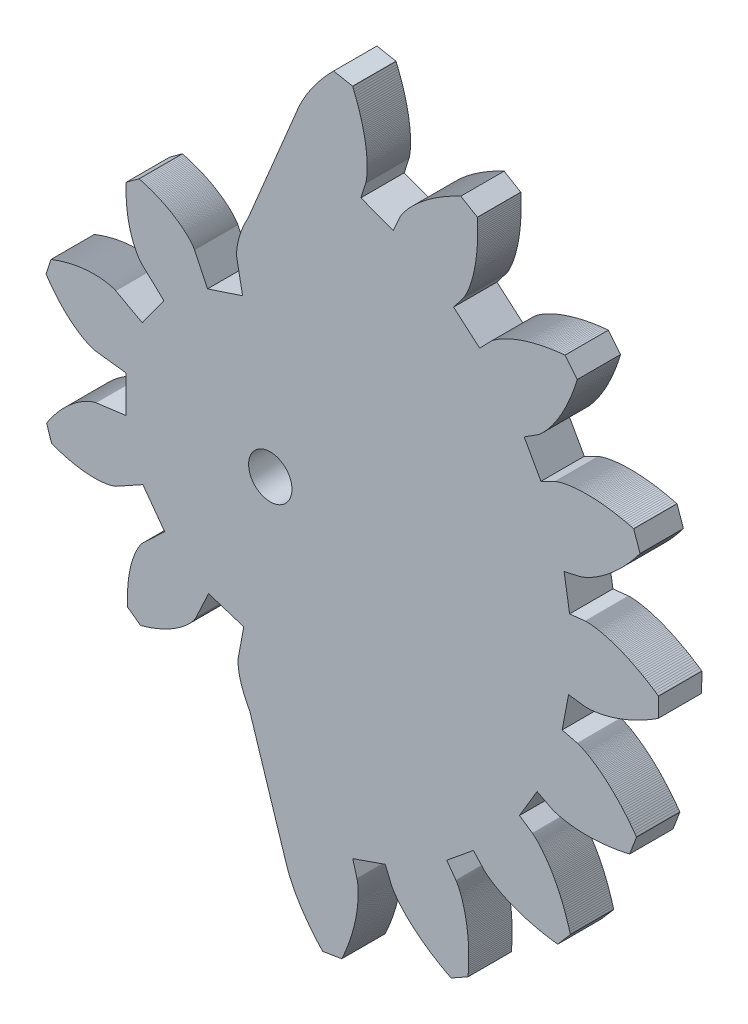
SolidWorks part; units mm, degrees
ref_plane "Front Plane" through (0, 0, 0) normal (0, 0, 1) x (1, 0, 0)
ref_plane "Top Plane" through (0, 0, 0) normal (0, 1, 0) x (1, 0, 0)
ref_plane "Right Plane" through (0, 0, 0) normal (1, 0, 0) x (0, 0, -1)
sketch "Sketch1" plane through (0, 0, 0) normal (0, 0, 1) x (1, 0, 0)
  line L0 (-8.6793, 18.1849) -> (-10.4882, 21.9749)
  line L1 (-10.4882, 21.9749) -> (-10.4898, 21.9782)
  line L2 (-10.4898, 21.9782) -> (-10.4919, 21.9823)
  line L3 (-10.4919, 21.9823) -> (-10.4949, 21.9881)
  line L4 (-10.4949, 21.9881) -> (-10.4988, 21.9955)
  line L5 (-10.4988, 21.9955) -> (-10.5036, 22.0045)
  line L6 (-10.5036, 22.0045) -> (-10.5094, 22.015)
  line L7 (-10.5094, 22.015) -> (-10.5162, 22.0272)
  line L8 (-10.5162, 22.0272) -> (-10.524, 22.0408)
  line L9 (-10.524, 22.0408) -> (-10.5329, 22.0561)
  line L10 (-10.5329, 22.0561) -> (-10.5429, 22.0728)
  line L11 (-10.5429, 22.0728) -> (-10.5539, 22.091)
  line L12 (-10.5539, 22.091) -> (-10.5661, 22.1107)
  line L13 (-10.5661, 22.1107) -> (-10.5795, 22.1319)
  line L14 (-10.5795, 22.1319) -> (-10.5941, 22.1545)
  line L15 (-10.5941, 22.1545) -> (-10.6098, 22.1785)
  line L16 (-10.6098, 22.1785) -> (-10.6268, 22.204)
  line L17 (-10.6268, 22.204) -> (-10.6451, 22.2308)
  line L18 (-10.6451, 22.2308) -> (-10.6647, 22.259)
  line L19 (-10.6647, 22.259) -> (-10.6855, 22.2885)
  line L20 (-10.6855, 22.2885) -> (-10.7078, 22.3193)
  line L21 (-10.7078, 22.3193) -> (-10.7313, 22.3515)
  line L22 (-10.7313, 22.3515) -> (-10.7563, 22.3849)
  line L23 (-10.7563, 22.3849) -> (-10.7827, 22.4196)
  line L24 (-10.7827, 22.4196) -> (-10.8105, 22.4555)
  line L25 (-10.8105, 22.4555) -> (-10.8398, 22.4926)
  line L26 (-10.8398, 22.4926) -> (-10.8706, 22.5309)
  line L27 (-10.8706, 22.5309) -> (-10.9028, 22.5704)
  line L28 (-10.9028, 22.5704) -> (-10.9366, 22.611)
  line L29 (-10.9366, 22.611) -> (-10.972, 22.6528)
  line L30 (-10.972, 22.6528) -> (-11.0089, 22.6956)
  line L31 (-11.0089, 22.6956) -> (-11.0475, 22.7395)
  line L32 (-11.0475, 22.7395) -> (-11.0876, 22.7845)
  line L33 (-11.0876, 22.7845) -> (-11.1294, 22.8304)
  line L34 (-11.1294, 22.8304) -> (-11.1728, 22.8774)
  line L35 (-11.1728, 22.8774) -> (-11.2179, 22.9253)
  line L36 (-11.2179, 22.9253) -> (-11.2648, 22.9742)
  line L37 (-11.2648, 22.9742) -> (-11.3133, 23.024)
  line L38 (-11.3133, 23.024) -> (-11.3636, 23.0747)
  line L39 (-11.3636, 23.0747) -> (-11.4156, 23.1263)
  line L40 (-11.4156, 23.1263) -> (-11.4694, 23.1786)
  line L41 (-11.4694, 23.1786) -> (-11.525, 23.2318)
  line L42 (-11.525, 23.2318) -> (-11.5824, 23.2858)
  line L43 (-11.5824, 23.2858) -> (-11.6417, 23.3406)
  line L44 (-11.6417, 23.3406) -> (-11.7028, 23.396)
  line L45 (-11.7028, 23.396) -> (-11.7657, 23.4522)
  line L46 (-11.7657, 23.4522) -> (-11.8306, 23.509)
  line L47 (-11.8306, 23.509) -> (-11.8973, 23.5665)
  line L48 (-11.8973, 23.5665) -> (-11.966, 23.6246)
  line L49 (-11.966, 23.6246) -> (-12.0365, 23.6833)
  line L50 (-12.0365, 23.6833) -> (-12.1091, 23.7425)
  line L51 (-12.1091, 23.7425) -> (-12.1836, 23.8023)
  line L52 (-12.1836, 23.8023) -> (-12.26, 23.8625)
  line L53 (-12.26, 23.8625) -> (-12.3385, 23.9232)
  line L54 (-12.3385, 23.9232) -> (-12.419, 23.9844)
  line L55 (-12.419, 23.9844) -> (-12.5014, 24.0459)
  line L56 (-12.5014, 24.0459) -> (-12.5859, 24.1079)
  line L57 (-12.5859, 24.1079) -> (-12.6725, 24.1701)
  line L58 (-12.6725, 24.1701) -> (-12.7611, 24.2327)
  line L59 (-12.7611, 24.2327) -> (-12.8518, 24.2956)
  line L60 (-12.8518, 24.2956) -> (-12.9445, 24.3587)
  line L61 (-12.9445, 24.3587) -> (-13.0393, 24.422)
  line L62 (-13.0393, 24.422) -> (-13.1363, 24.4855)
  line L63 (-13.1363, 24.4855) -> (-13.2353, 24.5492)
  line L64 (-13.2353, 24.5492) -> (-13.3365, 24.613)
  line L65 (-13.3365, 24.613) -> (-13.4398, 24.6769)
  line L66 (-13.4398, 24.6769) -> (-13.5452, 24.7408)
  line L67 (-13.5452, 24.7408) -> (-13.6528, 24.8048)
  line L68 (-13.6528, 24.8048) -> (-13.7626, 24.8688)
  line L69 (-13.7626, 24.8688) -> (-13.8745, 24.9327)
  line L70 (-13.8745, 24.9327) -> (-13.9885, 24.9965)
  line L71 (-13.9885, 24.9965) -> (-14.1048, 25.0603)
  line L72 (-14.1048, 25.0603) -> (-14.2232, 25.1239)
  line L73 (-14.2232, 25.1239) -> (-14.3439, 25.1873)
  line L74 (-14.3439, 25.1873) -> (-14.4667, 25.2505)
  line L75 (-14.4667, 25.2505) -> (-14.5917, 25.3135)
  line L76 (-14.5917, 25.3135) -> (-14.719, 25.3762)
  line L77 (-14.719, 25.3762) -> (-14.8484, 25.4386)
  line L78 (-14.8484, 25.4386) -> (-14.9801, 25.5007)
  line L79 (-14.9801, 25.5007) -> (-15.114, 25.5624)
  line L80 (-15.114, 25.5624) -> (-15.2501, 25.6236)
  line L81 (-15.2501, 25.6236) -> (-15.3885, 25.6845)
  line L82 (-15.3885, 25.6845) -> (-15.529, 25.7448)
  line L83 (-15.529, 25.7448) -> (-15.6718, 25.8047)
  line L84 (-15.6718, 25.8047) -> (-15.8169, 25.864)
  line L85 (-15.8169, 25.864) -> (-15.9641, 25.9227)
  line L86 (-15.9641, 25.9227) -> (-16.1137, 25.9808)
  line L87 (-16.1137, 25.9808) -> (-16.2654, 26.0382)
  line L88 (-16.2654, 26.0382) -> (-16.4194, 26.095)
  line L89 (-16.4194, 26.095) -> (-16.5756, 26.151)
  line L90 (-16.5756, 26.151) -> (-16.734, 26.2063)
  line L91 (-16.734, 26.2063) -> (-16.8947, 26.2608)
  line L92 (-16.8947, 26.2608) -> (-17.0576, 26.3145)
  line L93 (-17.0576, 26.3145) -> (-17.2228, 26.3673)
  line L94 (-17.2228, 26.3673) -> (-17.3901, 26.4192)
  line L95 (-17.3901, 26.4192) -> (-17.5597, 26.4702)
  line L96 (-17.5597, 26.4702) -> (-17.7315, 26.5202)
  line L97 (-17.7315, 26.5202) -> (-17.9055, 26.5693)
  line L98 (-17.9055, 26.5693) -> (-18.0818, 26.6172)
  line L99 (-18.0818, 26.6172) -> (-18.1612, 26.6381)
  line L100 (-18.1612, 26.6381) -> (-19.9281, 25.3434)
  line L101 (-19.9281, 25.3434) -> (-19.9321, 25.2614)
  line L102 (-19.9321, 25.2614) -> (-19.9394, 25.0789)
  line L103 (-19.9394, 25.0789) -> (-19.9451, 24.8982)
  line L104 (-19.9451, 24.8982) -> (-19.9492, 24.7193)
  line L105 (-19.9492, 24.7193) -> (-19.9517, 24.5422)
  line L106 (-19.9517, 24.5422) -> (-19.9526, 24.367)
  line L107 (-19.9526, 24.367) -> (-19.952, 24.1936)
  line L108 (-19.952, 24.1936) -> (-19.9499, 24.0221)
  line L109 (-19.9499, 24.0221) -> (-19.9463, 23.8525)
  line L110 (-19.9463, 23.8525) -> (-19.9414, 23.6847)
  line L111 (-19.9414, 23.6847) -> (-19.935, 23.5189)
  line L112 (-19.935, 23.5189) -> (-19.9273, 23.355)
  line L113 (-19.9273, 23.355) -> (-19.9182, 23.193)
  line L114 (-19.9182, 23.193) -> (-19.9079, 23.0329)
  line L115 (-19.9079, 23.0329) -> (-19.8963, 22.8748)
  line L116 (-19.8963, 22.8748) -> (-19.8834, 22.7186)
  line L117 (-19.8834, 22.7186) -> (-19.8694, 22.5644)
  line L118 (-19.8694, 22.5644) -> (-19.8542, 22.4122)
  line L119 (-19.8542, 22.4122) -> (-19.8379, 22.262)
  line L120 (-19.8379, 22.262) -> (-19.8205, 22.1137)
  line L121 (-19.8205, 22.1137) -> (-19.802, 21.9675)
  line L122 (-19.802, 21.9675) -> (-19.7825, 21.8232)
  line L123 (-19.7825, 21.8232) -> (-19.762, 21.681)
  line L124 (-19.762, 21.681) -> (-19.7405, 21.5408)
  line L125 (-19.7405, 21.5408) -> (-19.7182, 21.4026)
  line L126 (-19.7182, 21.4026) -> (-19.6949, 21.2664)
  line L127 (-19.6949, 21.2664) -> (-19.6707, 21.1322)
  line L128 (-19.6707, 21.1322) -> (-19.6458, 21.0001)
  line L129 (-19.6458, 21.0001) -> (-19.62, 20.8701)
  line L130 (-19.62, 20.8701) -> (-19.5935, 20.7421)
  line L131 (-19.5935, 20.7421) -> (-19.5663, 20.6161)
  line L132 (-19.5663, 20.6161) -> (-19.5384, 20.4922)
  line L133 (-19.5384, 20.4922) -> (-19.5098, 20.3703)
  line L134 (-19.5098, 20.3703) -> (-19.4806, 20.2505)
  line L135 (-19.4806, 20.2505) -> (-19.4508, 20.1328)
  line L136 (-19.4508, 20.1328) -> (-19.4205, 20.0171)
  line L137 (-19.4205, 20.0171) -> (-19.3896, 19.9035)
  line L138 (-19.3896, 19.9035) -> (-19.3582, 19.7919)
  line L139 (-19.3582, 19.7919) -> (-19.3264, 19.6824)
  line L140 (-19.3264, 19.6824) -> (-19.2942, 19.5749)
  line L141 (-19.2942, 19.5749) -> (-19.2616, 19.4695)
  line L142 (-19.2616, 19.4695) -> (-19.2286, 19.3662)
  line L143 (-19.2286, 19.3662) -> (-19.1953, 19.2649)
  line L144 (-19.1953, 19.2649) -> (-19.1617, 19.1657)
  line L145 (-19.1617, 19.1657) -> (-19.1278, 19.0685)
  line L146 (-19.1278, 19.0685) -> (-19.0938, 18.9733)
  line L147 (-19.0938, 18.9733) -> (-19.0595, 18.8802)
  line L148 (-19.0595, 18.8802) -> (-19.0251, 18.7891)
  line L149 (-19.0251, 18.7891) -> (-18.9906, 18.7001)
  line L150 (-18.9906, 18.7001) -> (-18.956, 18.6131)
  line L151 (-18.956, 18.6131) -> (-18.9213, 18.5281)
  line L152 (-18.9213, 18.5281) -> (-18.8866, 18.4452)
  line L153 (-18.8866, 18.4452) -> (-18.8519, 18.3642)
  line L154 (-18.8519, 18.3642) -> (-18.8172, 18.2852)
  line L155 (-18.8172, 18.2852) -> (-18.7826, 18.2083)
  line L156 (-18.7826, 18.2083) -> (-18.7482, 18.1333)
  line L157 (-18.7482, 18.1333) -> (-18.7138, 18.0603)
  line L158 (-18.7138, 18.0603) -> (-18.6796, 17.9893)
  line L159 (-18.6796, 17.9893) -> (-18.6457, 17.9203)
  line L160 (-18.6457, 17.9203) -> (-18.6119, 17.8532)
  line L161 (-18.6119, 17.8532) -> (-18.5784, 17.788)
  line L162 (-18.5784, 17.788) -> (-18.5453, 17.7248)
  line L163 (-18.5453, 17.7248) -> (-18.5124, 17.6635)
  line L164 (-18.5124, 17.6635) -> (-18.4799, 17.6042)
  line L165 (-18.4799, 17.6042) -> (-18.4478, 17.5467)
  line L166 (-18.4478, 17.5467) -> (-18.4161, 17.4911)
  line L167 (-18.4161, 17.4911) -> (-18.3848, 17.4374)
  line L168 (-18.3848, 17.4374) -> (-18.3541, 17.3856)
  line L169 (-18.3541, 17.3856) -> (-18.3238, 17.3357)
  line L170 (-18.3238, 17.3357) -> (-18.2941, 17.2875)
  line L171 (-18.2941, 17.2875) -> (-18.265, 17.2412)
  line L172 (-18.265, 17.2412) -> (-18.2364, 17.1968)
  line L173 (-18.2364, 17.1968) -> (-18.2085, 17.1541)
  line L174 (-18.2085, 17.1541) -> (-18.1812, 17.1132)
  line L175 (-18.1812, 17.1132) -> (-18.1546, 17.0741)
  line L176 (-18.1546, 17.0741) -> (-18.1288, 17.0368)
  line L177 (-18.1288, 17.0368) -> (-18.1037, 17.0012)
  line L178 (-18.1037, 17.0012) -> (-18.0793, 16.9673)
  line L179 (-18.0793, 16.9673) -> (-18.0558, 16.9351)
  line L180 (-18.0558, 16.9351) -> (-18.0331, 16.9046)
  line L181 (-18.0331, 16.9046) -> (-18.0112, 16.8758)
  line L182 (-18.0112, 16.8758) -> (-17.9902, 16.8487)
  line L183 (-17.9902, 16.8487) -> (-17.9702, 16.8232)
  line L184 (-17.9702, 16.8232) -> (-17.951, 16.7993)
  line L185 (-17.951, 16.7993) -> (-17.9329, 16.777)
  line L186 (-17.9329, 16.777) -> (-17.9157, 16.7563)
  line L187 (-17.9157, 16.7563) -> (-17.8995, 16.7372)
  line L188 (-17.8995, 16.7372) -> (-17.8844, 16.7196)
  line L189 (-17.8844, 16.7196) -> (-17.8704, 16.7036)
  line L190 (-17.8704, 16.7036) -> (-17.8574, 16.689)
  line L191 (-17.8574, 16.689) -> (-17.8456, 16.676)
  line L192 (-17.8456, 16.676) -> (-17.8349, 16.6644)
  line L193 (-17.8349, 16.6644) -> (-17.8254, 16.6543)
  line L194 (-17.8254, 16.6543) -> (-17.8171, 16.6456)
  line L195 (-17.8171, 16.6456) -> (-17.8099, 16.6382)
  line L196 (-17.8099, 16.6382) -> (-17.8041, 16.6323)
  line L197 (-17.8041, 16.6323) -> (-17.7995, 16.6277)
  line L198 (-17.7995, 16.6277) -> (-17.7962, 16.6245)
  line L199 (-17.7962, 16.6245) -> (-17.7935, 16.6219)
  line L200 (-17.7935, 16.6219) -> (-14.7247, 13.7552)
  line L201 (-14.7247, 13.7552) -> (-17.7106, 9.6104)
  line L202 (-17.7106, 9.6104) -> (-21.4016, 11.6132)
  line L203 (-21.4016, 11.6132) -> (-21.4049, 11.615)
  line L204 (-21.4049, 11.615) -> (-21.409, 11.6171)
  line L205 (-21.409, 11.6171) -> (-21.4148, 11.62)
  line L206 (-21.4148, 11.62) -> (-21.4223, 11.6237)
  line L207 (-21.4223, 11.6237) -> (-21.4315, 11.6281)
  line L208 (-21.4315, 11.6281) -> (-21.4424, 11.6333)
  line L209 (-21.4424, 11.6333) -> (-21.455, 11.6391)
  line L210 (-21.455, 11.6391) -> (-21.4694, 11.6456)
  line L211 (-21.4694, 11.6456) -> (-21.4855, 11.6526)
  line L212 (-21.4855, 11.6526) -> (-21.5034, 11.6603)
  line L213 (-21.5034, 11.6603) -> (-21.5231, 11.6686)
  line L214 (-21.5231, 11.6686) -> (-21.5445, 11.6773)
  line L215 (-21.5445, 11.6773) -> (-21.5678, 11.6866)
  line L216 (-21.5678, 11.6866) -> (-21.5929, 11.6963)
  line L217 (-21.5929, 11.6963) -> (-21.6197, 11.7065)
  line L218 (-21.6197, 11.7065) -> (-21.6484, 11.7171)
  line L219 (-21.6484, 11.7171) -> (-21.679, 11.7281)
  line L220 (-21.679, 11.7281) -> (-21.7114, 11.7394)
  line L221 (-21.7114, 11.7394) -> (-21.7456, 11.751)
  line L222 (-21.7456, 11.751) -> (-21.7817, 11.7629)
  line L223 (-21.7817, 11.7629) -> (-21.8197, 11.775)
  line L224 (-21.8197, 11.775) -> (-21.8596, 11.7874)
  line L225 (-21.8596, 11.7874) -> (-21.9013, 11.7999)
  line L226 (-21.9013, 11.7999) -> (-21.9449, 11.8126)
  line L227 (-21.9449, 11.8126) -> (-21.9904, 11.8254)
  line L228 (-21.9904, 11.8254) -> (-22.0378, 11.8384)
  line L229 (-22.0378, 11.8384) -> (-22.0871, 11.8513)
  line L230 (-22.0871, 11.8513) -> (-22.1384, 11.8643)
  line L231 (-22.1384, 11.8643) -> (-22.1915, 11.8773)
  line L232 (-22.1915, 11.8773) -> (-22.2466, 11.8902)
  line L233 (-22.2466, 11.8902) -> (-22.3035, 11.9031)
  line L234 (-22.3035, 11.9031) -> (-22.3624, 11.9159)
  line L235 (-22.3624, 11.9159) -> (-22.4233, 11.9285)
  line L236 (-22.4233, 11.9285) -> (-22.486, 11.941)
  line L237 (-22.486, 11.941) -> (-22.5507, 11.9533)
  line L238 (-22.5507, 11.9533) -> (-22.6173, 11.9653)
  line L239 (-22.6173, 11.9653) -> (-22.6858, 11.977)
  line L240 (-22.6858, 11.977) -> (-22.7563, 11.9885)
  line L241 (-22.7563, 11.9885) -> (-22.8287, 11.9996)
  line L242 (-22.8287, 11.9996) -> (-22.903, 12.0104)
  line L243 (-22.903, 12.0104) -> (-22.9793, 12.0207)
  line L244 (-22.9793, 12.0207) -> (-23.0574, 12.0307)
  line L245 (-23.0574, 12.0307) -> (-23.1375, 12.0401)
  line L246 (-23.1375, 12.0401) -> (-23.2196, 12.0491)
  line L247 (-23.2196, 12.0491) -> (-23.3035, 12.0575)
  line L248 (-23.3035, 12.0575) -> (-23.3894, 12.0654)
  line L249 (-23.3894, 12.0654) -> (-23.4772, 12.0726)
  line L250 (-23.4772, 12.0726) -> (-23.5669, 12.0793)
  line L251 (-23.5669, 12.0793) -> (-23.6585, 12.0853)
  line L252 (-23.6585, 12.0853) -> (-23.7519, 12.0906)
  line L253 (-23.7519, 12.0906) -> (-23.8473, 12.0951)
  line L254 (-23.8473, 12.0951) -> (-23.9446, 12.0989)
  line L255 (-23.9446, 12.0989) -> (-24.0438, 12.1019)
  line L256 (-24.0438, 12.1019) -> (-24.1448, 12.1041)
  line L257 (-24.1448, 12.1041) -> (-24.2477, 12.1054)
  line L258 (-24.2477, 12.1054) -> (-24.3525, 12.1058)
  line L259 (-24.3525, 12.1058) -> (-24.4591, 12.1053)
  line L260 (-24.4591, 12.1053) -> (-24.5676, 12.1039)
  line L261 (-24.5676, 12.1039) -> (-24.6779, 12.1015)
  line L262 (-24.6779, 12.1015) -> (-24.79, 12.098)
  line L263 (-24.79, 12.098) -> (-24.904, 12.0935)
  line L264 (-24.904, 12.0935) -> (-25.0197, 12.0879)
  line L265 (-25.0197, 12.0879) -> (-25.1373, 12.0812)
  line L266 (-25.1373, 12.0812) -> (-25.2566, 12.0733)
  line L267 (-25.2566, 12.0733) -> (-25.3777, 12.0643)
  line L268 (-25.3777, 12.0643) -> (-25.5006, 12.0541)
  line L269 (-25.5006, 12.0541) -> (-25.6253, 12.0426)
  line L270 (-25.6253, 12.0426) -> (-25.7516, 12.0298)
  line L271 (-25.7516, 12.0298) -> (-25.8797, 12.0158)
  line L272 (-25.8797, 12.0158) -> (-26.0096, 12.0004)
  line L273 (-26.0096, 12.0004) -> (-26.1411, 11.9836)
  line L274 (-26.1411, 11.9836) -> (-26.2743, 11.9654)
  line L275 (-26.2743, 11.9654) -> (-26.4092, 11.9458)
  line L276 (-26.4092, 11.9458) -> (-26.5457, 11.9248)
  line L277 (-26.5457, 11.9248) -> (-26.6839, 11.9023)
  line L278 (-26.6839, 11.9023) -> (-26.8237, 11.8782)
  line L279 (-26.8237, 11.8782) -> (-26.9651, 11.8526)
  line L280 (-26.9651, 11.8526) -> (-27.1081, 11.8254)
  line L281 (-27.1081, 11.8254) -> (-27.2527, 11.7966)
  line L282 (-27.2527, 11.7966) -> (-27.3988, 11.7662)
  line L283 (-27.3988, 11.7662) -> (-27.5465, 11.7341)
  line L284 (-27.5465, 11.7341) -> (-27.6957, 11.7003)
  line L285 (-27.6957, 11.7003) -> (-27.8464, 11.6647)
  line L286 (-27.8464, 11.6647) -> (-27.9986, 11.6275)
  line L287 (-27.9986, 11.6275) -> (-28.1522, 11.5884)
  line L288 (-28.1522, 11.5884) -> (-28.3073, 11.5475)
  line L289 (-28.3073, 11.5475) -> (-28.4639, 11.5048)
  line L290 (-28.4639, 11.5048) -> (-28.6218, 11.4602)
  line L291 (-28.6218, 11.4602) -> (-28.7811, 11.4137)
  line L292 (-28.7811, 11.4137) -> (-28.9418, 11.3653)
  line L293 (-28.9418, 11.3653) -> (-29.1038, 11.315)
  line L294 (-29.1038, 11.315) -> (-29.2672, 11.2626)
  line L295 (-29.2672, 11.2626) -> (-29.4318, 11.2083)
  line L296 (-29.4318, 11.2083) -> (-29.5977, 11.1519)
  line L297 (-29.5977, 11.1519) -> (-29.7649, 11.0935)
  line L298 (-29.7649, 11.0935) -> (-29.9333, 11.033)
  line L299 (-29.9333, 11.033) -> (-30.1029, 10.9704)
  line L300 (-30.1029, 10.9704) -> (-30.2737, 10.9056)
  line L301 (-30.2737, 10.9056) -> (-30.3502, 10.8758)
  line L302 (-30.3502, 10.8758) -> (-31.0187, 8.7898)
  line L303 (-31.0187, 8.7898) -> (-30.9737, 8.7211)
  line L304 (-30.9737, 8.7211) -> (-30.8724, 8.5692)
  line L305 (-30.8724, 8.5692) -> (-30.7707, 8.4196)
  line L306 (-30.7707, 8.4196) -> (-30.6689, 8.2725)
  line L307 (-30.6689, 8.2725) -> (-30.5668, 8.1278)
  line L308 (-30.5668, 8.1278) -> (-30.4646, 7.9855)
  line L309 (-30.4646, 7.9855) -> (-30.3622, 7.8456)
  line L310 (-30.3622, 7.8456) -> (-30.2597, 7.7081)
  line L311 (-30.2597, 7.7081) -> (-30.1571, 7.5729)
  line L312 (-30.1571, 7.5729) -> (-30.0544, 7.4401)
  line L313 (-30.0544, 7.4401) -> (-29.9518, 7.3097)
  line L314 (-29.9518, 7.3097) -> (-29.8492, 7.1816)
  line L315 (-29.8492, 7.1816) -> (-29.7467, 7.0559)
  line L316 (-29.7467, 7.0559) -> (-29.6442, 6.9325)
  line L317 (-29.6442, 6.9325) -> (-29.5419, 6.8114)
  line L318 (-29.5419, 6.8114) -> (-29.4397, 6.6926)
  line L319 (-29.4397, 6.6926) -> (-29.3377, 6.5761)
  line L320 (-29.3377, 6.5761) -> (-29.236, 6.4619)
  line L321 (-29.236, 6.4619) -> (-29.1344, 6.3499)
  line L322 (-29.1344, 6.3499) -> (-29.0332, 6.2402)
  line L323 (-29.0332, 6.2402) -> (-28.9323, 6.1327)
  line L324 (-28.9323, 6.1327) -> (-28.8317, 6.0275)
  line L325 (-28.8317, 6.0275) -> (-28.7315, 5.9245)
  line L326 (-28.7315, 5.9245) -> (-28.6318, 5.8236)
  line L327 (-28.6318, 5.8236) -> (-28.5324, 5.725)
  line L328 (-28.5324, 5.725) -> (-28.4336, 5.6285)
  line L329 (-28.4336, 5.6285) -> (-28.3352, 5.5342)
  line L330 (-28.3352, 5.5342) -> (-28.2374, 5.442)
  line L331 (-28.2374, 5.442) -> (-28.1401, 5.3519)
  line L332 (-28.1401, 5.3519) -> (-28.0434, 5.2639)
  line L333 (-28.0434, 5.2639) -> (-27.9473, 5.178)
  line L334 (-27.9473, 5.178) -> (-27.8519, 5.0942)
  line L335 (-27.8519, 5.0942) -> (-27.7571, 5.0124)
  line L336 (-27.7571, 5.0124) -> (-27.6631, 4.9326)
  line L337 (-27.6631, 4.9326) -> (-27.5698, 4.8549)
  line L338 (-27.5698, 4.8549) -> (-27.4772, 4.7791)
  line L339 (-27.4772, 4.7791) -> (-27.3855, 4.7053)
  line L340 (-27.3855, 4.7053) -> (-27.2945, 4.6335)
  line L341 (-27.2945, 4.6335) -> (-27.2044, 4.5636)
  line L342 (-27.2044, 4.5636) -> (-27.1152, 4.4956)
  line L343 (-27.1152, 4.4956) -> (-27.0268, 4.4295)
  line L344 (-27.0268, 4.4295) -> (-26.9394, 4.3653)
  line L345 (-26.9394, 4.3653) -> (-26.8529, 4.3029)
  line L346 (-26.8529, 4.3029) -> (-26.7674, 4.2424)
  line L347 (-26.7674, 4.2424) -> (-26.6829, 4.1837)
  line L348 (-26.6829, 4.1837) -> (-26.5994, 4.1267)
  line L349 (-26.5994, 4.1267) -> (-26.517, 4.0715)
  line L350 (-26.517, 4.0715) -> (-26.4356, 4.0181)
  line L351 (-26.4356, 4.0181) -> (-26.3554, 3.9663)
  line L352 (-26.3554, 3.9663) -> (-26.2762, 3.9163)
  line L353 (-26.2762, 3.9163) -> (-26.1982, 3.8679)
  line L354 (-26.1982, 3.8679) -> (-26.1213, 3.8212)
  line L355 (-26.1213, 3.8212) -> (-26.0457, 3.7761)
  line L356 (-26.0457, 3.7761) -> (-25.9712, 3.7326)
  line L357 (-25.9712, 3.7326) -> (-25.898, 3.6907)
  line L358 (-25.898, 3.6907) -> (-25.8261, 3.6503)
  line L359 (-25.8261, 3.6503) -> (-25.7554, 3.6114)
  line L360 (-25.7554, 3.6114) -> (-25.686, 3.574)
  line L361 (-25.686, 3.574) -> (-25.6179, 3.5382)
  line L362 (-25.6179, 3.5382) -> (-25.5512, 3.5037)
  line L363 (-25.5512, 3.5037) -> (-25.4858, 3.4707)
  line L364 (-25.4858, 3.4707) -> (-25.4218, 3.439)
  line L365 (-25.4218, 3.439) -> (-25.3592, 3.4088)
  line L366 (-25.3592, 3.4088) -> (-25.298, 3.3799)
  line L367 (-25.298, 3.3799) -> (-25.2383, 3.3522)
  line L368 (-25.2383, 3.3522) -> (-25.18, 3.3259)
  line L369 (-25.18, 3.3259) -> (-25.1231, 3.3008)
  line L370 (-25.1231, 3.3008) -> (-25.0678, 3.277)
  line L371 (-25.0678, 3.277) -> (-25.0139, 3.2544)
  line L372 (-25.0139, 3.2544) -> (-24.9616, 3.2329)
  line L373 (-24.9616, 3.2329) -> (-24.9108, 3.2126)
  line L374 (-24.9108, 3.2126) -> (-24.8616, 3.1934)
  line L375 (-24.8616, 3.1934) -> (-24.8139, 3.1753)
  line L376 (-24.8139, 3.1753) -> (-24.7678, 3.1582)
  line L377 (-24.7678, 3.1582) -> (-24.7233, 3.1422)
  line L378 (-24.7233, 3.1422) -> (-24.6805, 3.1272)
  line L379 (-24.6805, 3.1272) -> (-24.6392, 3.1132)
  line L380 (-24.6392, 3.1132) -> (-24.5996, 3.1001)
  line L381 (-24.5996, 3.1001) -> (-24.5616, 3.0879)
  line L382 (-24.5616, 3.0879) -> (-24.5253, 3.0766)
  line L383 (-24.5253, 3.0766) -> (-24.4907, 3.0661)
  line L384 (-24.4907, 3.0661) -> (-24.4578, 3.0565)
  line L385 (-24.4578, 3.0565) -> (-24.4266, 3.0476)
  line L386 (-24.4266, 3.0476) -> (-24.3971, 3.0396)
  line L387 (-24.3971, 3.0396) -> (-24.3693, 3.0322)
  line L388 (-24.3693, 3.0322) -> (-24.3432, 3.0256)
  line L389 (-24.3432, 3.0256) -> (-24.3189, 3.0196)
  line L390 (-24.3189, 3.0196) -> (-24.2964, 3.0143)
  line L391 (-24.2964, 3.0143) -> (-24.2756, 3.0095)
  line L392 (-24.2756, 3.0095) -> (-24.2565, 3.0054)
  line L393 (-24.2565, 3.0054) -> (-24.2393, 3.0018)
  line L394 (-24.2393, 3.0018) -> (-24.2238, 2.9987)
  line L395 (-24.2238, 2.9987) -> (-24.2102, 2.9961)
  line L396 (-24.2102, 2.9961) -> (-24.1983, 2.9939)
  line L397 (-24.1983, 2.9939) -> (-24.1883, 2.9922)
  line L398 (-24.1883, 2.9922) -> (-24.18, 2.9908)
  line L399 (-24.18, 2.9908) -> (-24.1736, 2.9899)
  line L400 (-24.1736, 2.9899) -> (-24.169, 2.9892)
  line L401 (-24.169, 2.9892) -> (-24.1654, 2.9887)
  line L402 (-24.1654, 2.9887) -> (-19.9976, 2.4732)
  line L403 (-19.9976, 2.4732) -> (-19.977, -2.6351)
  line L404 (-19.977, -2.6351) -> (-24.1404, -3.1842)
  line L405 (-24.1404, -3.1842) -> (-24.144, -3.1848)
  line L406 (-24.144, -3.1848) -> (-24.1486, -3.1855)
  line L407 (-24.1486, -3.1855) -> (-24.155, -3.1865)
  line L408 (-24.155, -3.1865) -> (-24.1633, -3.1879)
  line L409 (-24.1633, -3.1879) -> (-24.1733, -3.1898)
  line L410 (-24.1733, -3.1898) -> (-24.1851, -3.192)
  line L411 (-24.1851, -3.192) -> (-24.1988, -3.1947)
  line L412 (-24.1988, -3.1947) -> (-24.2142, -3.1979)
  line L413 (-24.2142, -3.1979) -> (-24.2314, -3.2017)
  line L414 (-24.2314, -3.2017) -> (-24.2504, -3.206)
  line L415 (-24.2504, -3.206) -> (-24.2712, -3.2109)
  line L416 (-24.2712, -3.2109) -> (-24.2937, -3.2164)
  line L417 (-24.2937, -3.2164) -> (-24.3179, -3.2226)
  line L418 (-24.3179, -3.2226) -> (-24.3439, -3.2294)
  line L419 (-24.3439, -3.2294) -> (-24.3717, -3.237)
  line L420 (-24.3717, -3.237) -> (-24.4011, -3.2453)
  line L421 (-24.4011, -3.2453) -> (-24.4323, -3.2544)
  line L422 (-24.4323, -3.2544) -> (-24.4651, -3.2643)
  line L423 (-24.4651, -3.2643) -> (-24.4996, -3.275)
  line L424 (-24.4996, -3.275) -> (-24.5358, -3.2866)
  line L425 (-24.5358, -3.2866) -> (-24.5737, -3.2991)
  line L426 (-24.5737, -3.2991) -> (-24.6132, -3.3125)
  line L427 (-24.6132, -3.3125) -> (-24.6543, -3.3269)
  line L428 (-24.6543, -3.3269) -> (-24.6971, -3.3423)
  line L429 (-24.6971, -3.3423) -> (-24.7414, -3.3587)
  line L430 (-24.7414, -3.3587) -> (-24.7874, -3.3761)
  line L431 (-24.7874, -3.3761) -> (-24.8349, -3.3946)
  line L432 (-24.8349, -3.3946) -> (-24.884, -3.4142)
  line L433 (-24.884, -3.4142) -> (-24.9346, -3.4349)
  line L434 (-24.9346, -3.4349) -> (-24.9868, -3.4568)
  line L435 (-24.9868, -3.4568) -> (-25.0404, -3.4799)
  line L436 (-25.0404, -3.4799) -> (-25.0956, -3.5041)
  line L437 (-25.0956, -3.5041) -> (-25.1522, -3.5297)
  line L438 (-25.1522, -3.5297) -> (-25.2103, -3.5565)
  line L439 (-25.2103, -3.5565) -> (-25.2698, -3.5846)
  line L440 (-25.2698, -3.5846) -> (-25.3308, -3.614)
  line L441 (-25.3308, -3.614) -> (-25.3931, -3.6448)
  line L442 (-25.3931, -3.6448) -> (-25.4569, -3.6769)
  line L443 (-25.4569, -3.6769) -> (-25.522, -3.7105)
  line L444 (-25.522, -3.7105) -> (-25.5884, -3.7455)
  line L445 (-25.5884, -3.7455) -> (-25.6562, -3.7819)
  line L446 (-25.6562, -3.7819) -> (-25.7253, -3.8198)
  line L447 (-25.7253, -3.8198) -> (-25.7957, -3.8592)
  line L448 (-25.7957, -3.8592) -> (-25.8673, -3.9002)
  line L449 (-25.8673, -3.9002) -> (-25.9402, -3.9427)
  line L450 (-25.9402, -3.9427) -> (-26.0143, -3.9868)
  line L451 (-26.0143, -3.9868) -> (-26.0896, -4.0326)
  line L452 (-26.0896, -4.0326) -> (-26.166, -4.0799)
  line L453 (-26.166, -4.0799) -> (-26.2436, -4.1289)
  line L454 (-26.2436, -4.1289) -> (-26.3224, -4.1796)
  line L455 (-26.3224, -4.1796) -> (-26.4022, -4.232)
  line L456 (-26.4022, -4.232) -> (-26.4832, -4.2861)
  line L457 (-26.4832, -4.2861) -> (-26.5651, -4.3419)
  line L458 (-26.5651, -4.3419) -> (-26.6482, -4.3996)
  line L459 (-26.6482, -4.3996) -> (-26.7322, -4.459)
  line L460 (-26.7322, -4.459) -> (-26.8172, -4.5202)
  line L461 (-26.8172, -4.5202) -> (-26.9032, -4.5833)
  line L462 (-26.9032, -4.5833) -> (-26.9901, -4.6482)
  line L463 (-26.9901, -4.6482) -> (-27.0779, -4.715)
  line L464 (-27.0779, -4.715) -> (-27.1666, -4.7837)
  line L465 (-27.1666, -4.7837) -> (-27.2561, -4.8543)
  line L466 (-27.2561, -4.8543) -> (-27.3465, -4.9269)
  line L467 (-27.3465, -4.9269) -> (-27.4376, -5.0014)
  line L468 (-27.4376, -5.0014) -> (-27.5296, -5.0779)
  line L469 (-27.5296, -5.0779) -> (-27.6223, -5.1564)
  line L470 (-27.6223, -5.1564) -> (-27.7156, -5.2369)
  line L471 (-27.7156, -5.2369) -> (-27.8097, -5.3195)
  line L472 (-27.8097, -5.3195) -> (-27.9045, -5.4041)
  line L473 (-27.9045, -5.4041) -> (-27.9998, -5.4908)
  line L474 (-27.9998, -5.4908) -> (-28.0958, -5.5795)
  line L475 (-28.0958, -5.5795) -> (-28.1924, -5.6704)
  line L476 (-28.1924, -5.6704) -> (-28.2895, -5.7634)
  line L477 (-28.2895, -5.7634) -> (-28.3871, -5.8585)
  line L478 (-28.3871, -5.8585) -> (-28.4851, -5.9558)
  line L479 (-28.4851, -5.9558) -> (-28.5837, -6.0553)
  line L480 (-28.5837, -6.0553) -> (-28.6826, -6.1569)
  line L481 (-28.6826, -6.1569) -> (-28.782, -6.2607)
  line L482 (-28.782, -6.2607) -> (-28.8817, -6.3668)
  line L483 (-28.8817, -6.3668) -> (-28.9817, -6.4751)
  line L484 (-28.9817, -6.4751) -> (-29.0821, -6.5856)
  line L485 (-29.0821, -6.5856) -> (-29.1827, -6.6984)
  line L486 (-29.1827, -6.6984) -> (-29.2835, -6.8134)
  line L487 (-29.2835, -6.8134) -> (-29.3846, -6.9307)
  line L488 (-29.3846, -6.9307) -> (-29.4858, -7.0503)
  line L489 (-29.4858, -7.0503) -> (-29.5871, -7.1723)
  line L490 (-29.5871, -7.1723) -> (-29.6886, -7.2965)
  line L491 (-29.6886, -7.2965) -> (-29.7901, -7.4231)
  line L492 (-29.7901, -7.4231) -> (-29.8917, -7.552)
  line L493 (-29.8917, -7.552) -> (-29.9932, -7.6832)
  line L494 (-29.9932, -7.6832) -> (-30.0948, -7.8168)
  line L495 (-30.0948, -7.8168) -> (-30.1963, -7.9528)
  line L496 (-30.1963, -7.9528) -> (-30.2976, -8.0911)
  line L497 (-30.2976, -8.0911) -> (-30.3989, -8.2319)
  line L498 (-30.3989, -8.2319) -> (-30.5, -8.375)
  line L499 (-30.5, -8.375) -> (-30.6009, -8.5205)
  line L500 (-30.6009, -8.5205) -> (-30.7016, -8.6685)
  line L501 (-30.7016, -8.6685) -> (-30.802, -8.8188)
  line L502 (-30.802, -8.8188) -> (-30.9021, -8.9716)
  line L503 (-30.9021, -8.9716) -> (-30.9465, -9.0407)
  line L504 (-30.9465, -9.0407) -> (-30.2611, -11.1212)
  line L505 (-30.2611, -11.1212) -> (-30.1844, -11.1504)
  line L506 (-30.1844, -11.1504) -> (-30.0131, -11.2137)
  line L507 (-30.0131, -11.2137) -> (-29.843, -11.275)
  line L508 (-29.843, -11.275) -> (-29.6741, -11.3341)
  line L509 (-29.6741, -11.3341) -> (-29.5065, -11.3912)
  line L510 (-29.5065, -11.3912) -> (-29.3401, -11.4462)
  line L511 (-29.3401, -11.4462) -> (-29.175, -11.4992)
  line L512 (-29.175, -11.4992) -> (-29.0113, -11.5502)
  line L513 (-29.0113, -11.5502) -> (-28.8488, -11.5993)
  line L514 (-28.8488, -11.5993) -> (-28.6878, -11.6464)
  line L515 (-28.6878, -11.6464) -> (-28.5281, -11.6916)
  line L516 (-28.5281, -11.6916) -> (-28.3698, -11.7349)
  line L517 (-28.3698, -11.7349) -> (-28.2129, -11.7763)
  line L518 (-28.2129, -11.7763) -> (-28.0575, -11.8159)
  line L519 (-28.0575, -11.8159) -> (-27.9035, -11.8538)
  line L520 (-27.9035, -11.8538) -> (-27.751, -11.8898)
  line L521 (-27.751, -11.8898) -> (-27.6, -11.9241)
  line L522 (-27.6, -11.9241) -> (-27.4506, -11.9567)
  line L523 (-27.4506, -11.9567) -> (-27.3026, -11.9876)
  line L524 (-27.3026, -11.9876) -> (-27.1563, -12.0169)
  line L525 (-27.1563, -12.0169) -> (-27.0115, -12.0445)
  line L526 (-27.0115, -12.0445) -> (-26.8682, -12.0705)
  line L527 (-26.8682, -12.0705) -> (-26.7266, -12.095)
  line L528 (-26.7266, -12.095) -> (-26.5866, -12.1179)
  line L529 (-26.5866, -12.1179) -> (-26.4483, -12.1393)
  line L530 (-26.4483, -12.1393) -> (-26.3116, -12.1593)
  line L531 (-26.3116, -12.1593) -> (-26.1766, -12.1778)
  line L532 (-26.1766, -12.1778) -> (-26.0432, -12.1949)
  line L533 (-26.0432, -12.1949) -> (-25.9116, -12.2106)
  line L534 (-25.9116, -12.2106) -> (-25.7816, -12.2249)
  line L535 (-25.7816, -12.2249) -> (-25.6534, -12.2379)
  line L536 (-25.6534, -12.2379) -> (-25.5269, -12.2497)
  line L537 (-25.5269, -12.2497) -> (-25.4022, -12.2601)
  line L538 (-25.4022, -12.2601) -> (-25.2792, -12.2694)
  line L539 (-25.2792, -12.2694) -> (-25.158, -12.2774)
  line L540 (-25.158, -12.2774) -> (-25.0386, -12.2843)
  line L541 (-25.0386, -12.2843) -> (-24.921, -12.2901)
  line L542 (-24.921, -12.2901) -> (-24.8052, -12.2947)
  line L543 (-24.8052, -12.2947) -> (-24.6912, -12.2983)
  line L544 (-24.6912, -12.2983) -> (-24.5791, -12.3009)
  line L545 (-24.5791, -12.3009) -> (-24.4688, -12.3024)
  line L546 (-24.4688, -12.3024) -> (-24.3603, -12.303)
  line L547 (-24.3603, -12.303) -> (-24.2537, -12.3026)
  line L548 (-24.2537, -12.3026) -> (-24.1489, -12.3013)
  line L549 (-24.1489, -12.3013) -> (-24.046, -12.2992)
  line L550 (-24.046, -12.2992) -> (-23.945, -12.2962)
  line L551 (-23.945, -12.2962) -> (-23.8459, -12.2924)
  line L552 (-23.8459, -12.2924) -> (-23.7486, -12.2878)
  line L553 (-23.7486, -12.2878) -> (-23.6533, -12.2825)
  line L554 (-23.6533, -12.2825) -> (-23.5598, -12.2764)
  line L555 (-23.5598, -12.2764) -> (-23.4683, -12.2697)
  line L556 (-23.4683, -12.2697) -> (-23.3787, -12.2623)
  line L557 (-23.3787, -12.2623) -> (-23.2909, -12.2544)
  line L558 (-23.2909, -12.2544) -> (-23.2051, -12.2458)
  line L559 (-23.2051, -12.2458) -> (-23.1213, -12.2367)
  line L560 (-23.1213, -12.2367) -> (-23.0393, -12.2271)
  line L561 (-23.0393, -12.2271) -> (-22.9593, -12.2169)
  line L562 (-22.9593, -12.2169) -> (-22.8812, -12.2064)
  line L563 (-22.8812, -12.2064) -> (-22.805, -12.1954)
  line L564 (-22.805, -12.1954) -> (-22.7308, -12.1841)
  line L565 (-22.7308, -12.1841) -> (-22.6585, -12.1723)
  line L566 (-22.6585, -12.1723) -> (-22.5881, -12.1603)
  line L567 (-22.5881, -12.1603) -> (-22.5197, -12.148)
  line L568 (-22.5197, -12.148) -> (-22.4532, -12.1354)
  line L569 (-22.4532, -12.1354) -> (-22.3886, -12.1227)
  line L570 (-22.3886, -12.1227) -> (-22.3259, -12.1097)
  line L571 (-22.3259, -12.1097) -> (-22.2652, -12.0966)
  line L572 (-22.2652, -12.0966) -> (-22.2064, -12.0833)
  line L573 (-22.2064, -12.0833) -> (-22.1496, -12.07)
  line L574 (-22.1496, -12.07) -> (-22.0946, -12.0566)
  line L575 (-22.0946, -12.0566) -> (-22.0416, -12.0432)
  line L576 (-22.0416, -12.0432) -> (-21.9905, -12.0298)
  line L577 (-21.9905, -12.0298) -> (-21.9413, -12.0164)
  line L578 (-21.9413, -12.0164) -> (-21.8939, -12.0031)
  line L579 (-21.8939, -12.0031) -> (-21.8485, -11.9899)
  line L580 (-21.8485, -11.9899) -> (-21.805, -11.9769)
  line L581 (-21.805, -11.9769) -> (-21.7634, -11.964)
  line L582 (-21.7634, -11.964) -> (-21.7237, -11.9513)
  line L583 (-21.7237, -11.9513) -> (-21.6858, -11.9388)
  line L584 (-21.6858, -11.9388) -> (-21.6498, -11.9266)
  line L585 (-21.6498, -11.9266) -> (-21.6156, -11.9148)
  line L586 (-21.6156, -11.9148) -> (-21.5833, -11.9032)
  line L587 (-21.5833, -11.9032) -> (-21.5529, -11.892)
  line L588 (-21.5529, -11.892) -> (-21.5242, -11.8812)
  line L589 (-21.5242, -11.8812) -> (-21.4975, -11.8708)
  line L590 (-21.4975, -11.8708) -> (-21.4725, -11.8608)
  line L591 (-21.4725, -11.8608) -> (-21.4493, -11.8514)
  line L592 (-21.4493, -11.8514) -> (-21.4279, -11.8424)
  line L593 (-21.4279, -11.8424) -> (-21.4083, -11.834)
  line L594 (-21.4083, -11.834) -> (-21.3905, -11.8262)
  line L595 (-21.3905, -11.8262) -> (-21.3744, -11.819)
  line L596 (-21.3744, -11.819) -> (-21.3601, -11.8124)
  line L597 (-21.3601, -11.8124) -> (-21.3475, -11.8065)
  line L598 (-21.3475, -11.8065) -> (-21.3366, -11.8013)
  line L599 (-21.3366, -11.8013) -> (-21.3275, -11.7968)
  line L600 (-21.3275, -11.7968) -> (-21.32, -11.793)
  line L601 (-21.32, -11.793) -> (-21.3143, -11.7901)
  line L602 (-21.3143, -11.7901) -> (-21.3102, -11.7879)
  line L603 (-21.3102, -11.7879) -> (-21.3069, -11.7861)
  line L604 (-21.3069, -11.7861) -> (-17.6322, -9.7534)
  line L605 (-17.6322, -9.7534) -> (-14.6128, -13.874)
  line L606 (-14.6128, -13.874) -> (-17.6583, -16.7655)
  line L607 (-17.6583, -16.7655) -> (-17.661, -16.768)
  line L608 (-17.661, -16.768) -> (-17.6643, -16.7713)
  line L609 (-17.6643, -16.7713) -> (-17.6688, -16.7759)
  line L610 (-17.6688, -16.7759) -> (-17.6747, -16.7819)
  line L611 (-17.6747, -16.7819) -> (-17.6817, -16.7893)
  line L612 (-17.6817, -16.7893) -> (-17.69, -16.7981)
  line L613 (-17.69, -16.7981) -> (-17.6994, -16.8083)
  line L614 (-17.6994, -16.8083) -> (-17.71, -16.8199)
  line L615 (-17.71, -16.8199) -> (-17.7217, -16.8331)
  line L616 (-17.7217, -16.8331) -> (-17.7345, -16.8477)
  line L617 (-17.7345, -16.8477) -> (-17.7485, -16.8639)
  line L618 (-17.7485, -16.8639) -> (-17.7634, -16.8816)
  line L619 (-17.7634, -16.8816) -> (-17.7794, -16.9008)
  line L620 (-17.7794, -16.9008) -> (-17.7964, -16.9217)
  line L621 (-17.7964, -16.9217) -> (-17.8144, -16.9441)
  line L622 (-17.8144, -16.9441) -> (-17.8334, -16.9681)
  line L623 (-17.8334, -16.9681) -> (-17.8532, -16.9938)
  line L624 (-17.8532, -16.9938) -> (-17.874, -17.0211)
  line L625 (-17.874, -17.0211) -> (-17.8956, -17.0501)
  line L626 (-17.8956, -17.0501) -> (-17.9181, -17.0807)
  line L627 (-17.9181, -17.0807) -> (-17.9414, -17.1131)
  line L628 (-17.9414, -17.1131) -> (-17.9654, -17.1472)
  line L629 (-17.9654, -17.1472) -> (-17.9903, -17.183)
  line L630 (-17.9903, -17.183) -> (-18.0158, -17.2205)
  line L631 (-18.0158, -17.2205) -> (-18.0421, -17.2599)
  line L632 (-18.0421, -17.2599) -> (-18.069, -17.301)
  line L633 (-18.069, -17.301) -> (-18.0966, -17.3439)
  line L634 (-18.0966, -17.3439) -> (-18.1248, -17.3886)
  line L635 (-18.1248, -17.3886) -> (-18.1535, -17.4351)
  line L636 (-18.1535, -17.4351) -> (-18.1829, -17.4834)
  line L637 (-18.1829, -17.4834) -> (-18.2127, -17.5337)
  line L638 (-18.2127, -17.5337) -> (-18.2431, -17.5857)
  line L639 (-18.2431, -17.5857) -> (-18.2739, -17.6397)
  line L640 (-18.2739, -17.6397) -> (-18.3051, -17.6955)
  line L641 (-18.3051, -17.6955) -> (-18.3368, -17.7532)
  line L642 (-18.3368, -17.7532) -> (-18.3688, -17.8128)
  line L643 (-18.3688, -17.8128) -> (-18.4011, -17.8744)
  line L644 (-18.4011, -17.8744) -> (-18.4338, -17.9379)
  line L645 (-18.4338, -17.9379) -> (-18.4668, -18.0033)
  line L646 (-18.4668, -18.0033) -> (-18.5, -18.0706)
  line L647 (-18.5, -18.0706) -> (-18.5334, -18.14)
  line L648 (-18.5334, -18.14) -> (-18.567, -18.2113)
  line L649 (-18.567, -18.2113) -> (-18.6007, -18.2845)
  line L650 (-18.6007, -18.2845) -> (-18.6346, -18.3598)
  line L651 (-18.6346, -18.3598) -> (-18.6686, -18.437)
  line L652 (-18.6686, -18.437) -> (-18.7026, -18.5162)
  line L653 (-18.7026, -18.5162) -> (-18.7366, -18.5975)
  line L654 (-18.7366, -18.5975) -> (-18.7706, -18.6807)
  line L655 (-18.7706, -18.6807) -> (-18.8046, -18.766)
  line L656 (-18.8046, -18.766) -> (-18.8386, -18.8533)
  line L657 (-18.8386, -18.8533) -> (-18.8724, -18.9426)
  line L658 (-18.8724, -18.9426) -> (-18.906, -19.0339)
  line L659 (-18.906, -19.0339) -> (-18.9395, -19.1273)
  line L660 (-18.9395, -19.1273) -> (-18.9728, -19.2227)
  line L661 (-18.9728, -19.2227) -> (-19.0059, -19.3202)
  line L662 (-19.0059, -19.3202) -> (-19.0387, -19.4197)
  line L663 (-19.0387, -19.4197) -> (-19.0711, -19.5212)
  line L664 (-19.0711, -19.5212) -> (-19.1033, -19.6248)
  line L665 (-19.1033, -19.6248) -> (-19.1351, -19.7305)
  line L666 (-19.1351, -19.7305) -> (-19.1664, -19.8382)
  line L667 (-19.1664, -19.8382) -> (-19.1973, -19.948)
  line L668 (-19.1973, -19.948) -> (-19.2278, -20.0598)
  line L669 (-19.2278, -20.0598) -> (-19.2578, -20.1737)
  line L670 (-19.2578, -20.1737) -> (-19.2872, -20.2896)
  line L671 (-19.2872, -20.2896) -> (-19.316, -20.4076)
  line L672 (-19.316, -20.4076) -> (-19.3442, -20.5276)
  line L673 (-19.3442, -20.5276) -> (-19.3718, -20.6497)
  line L674 (-19.3718, -20.6497) -> (-19.3987, -20.7738)
  line L675 (-19.3987, -20.7738) -> (-19.425, -20.9)
  line L676 (-19.425, -20.9) -> (-19.4504, -21.0283)
  line L677 (-19.4504, -21.0283) -> (-19.4751, -21.1585)
  line L678 (-19.4751, -21.1585) -> (-19.499, -21.2908)
  line L679 (-19.499, -21.2908) -> (-19.5221, -21.4251)
  line L680 (-19.5221, -21.4251) -> (-19.5442, -21.5615)
  line L681 (-19.5442, -21.5615) -> (-19.5655, -21.6999)
  line L682 (-19.5655, -21.6999) -> (-19.5858, -21.8403)
  line L683 (-19.5858, -21.8403) -> (-19.6051, -21.9827)
  line L684 (-19.6051, -21.9827) -> (-19.6235, -22.1271)
  line L685 (-19.6235, -22.1271) -> (-19.6408, -22.2735)
  line L686 (-19.6408, -22.2735) -> (-19.657, -22.4219)
  line L687 (-19.657, -22.4219) -> (-19.6721, -22.5722)
  line L688 (-19.6721, -22.5722) -> (-19.686, -22.7246)
  line L689 (-19.686, -22.7246) -> (-19.6988, -22.8789)
  line L690 (-19.6988, -22.8789) -> (-19.7104, -23.0351)
  line L691 (-19.7104, -23.0351) -> (-19.7207, -23.1934)
  line L692 (-19.7207, -23.1934) -> (-19.7298, -23.3535)
  line L693 (-19.7298, -23.3535) -> (-19.7375, -23.5156)
  line L694 (-19.7375, -23.5156) -> (-19.7439, -23.6795)
  line L695 (-19.7439, -23.6795) -> (-19.7489, -23.8454)
  line L696 (-19.7489, -23.8454) -> (-19.7526, -24.0132)
  line L697 (-19.7526, -24.0132) -> (-19.7547, -24.1829)
  line L698 (-19.7547, -24.1829) -> (-19.7554, -24.3544)
  line L699 (-19.7554, -24.3544) -> (-19.7546, -24.5278)
  line L700 (-19.7546, -24.5278) -> (-19.7523, -24.703)
  line L701 (-19.7523, -24.703) -> (-19.7484, -24.88)
  line L702 (-19.7484, -24.88) -> (-19.7429, -25.0589)
  line L703 (-19.7429, -25.0589) -> (-19.7357, -25.2395)
  line L704 (-19.7357, -25.2395) -> (-19.7269, -25.422)
  line L705 (-19.7269, -25.422) -> (-19.7223, -25.5039)
  line L706 (-19.7223, -25.5039) -> (-17.9449, -26.7843)
  line L707 (-17.9449, -26.7843) -> (-17.8657, -26.7628)
  line L708 (-17.8657, -26.7628) -> (-17.6898, -26.7134)
  line L709 (-17.6898, -26.7134) -> (-17.5162, -26.6629)
  line L710 (-17.5162, -26.6629) -> (-17.3448, -26.6115)
  line L711 (-17.3448, -26.6115) -> (-17.1757, -26.5591)
  line L712 (-17.1757, -26.5591) -> (-17.0087, -26.5059)
  line L713 (-17.0087, -26.5059) -> (-16.844, -26.4517)
  line L714 (-16.844, -26.4517) -> (-16.6815, -26.3967)
  line L715 (-16.6815, -26.3967) -> (-16.5213, -26.3409)
  line L716 (-16.5213, -26.3409) -> (-16.3633, -26.2844)
  line L717 (-16.3633, -26.2844) -> (-16.2076, -26.2271)
  line L718 (-16.2076, -26.2271) -> (-16.054, -26.169)
  line L719 (-16.054, -26.169) -> (-15.9028, -26.1104)
  line L720 (-15.9028, -26.1104) -> (-15.7537, -26.0511)
  line L721 (-15.7537, -26.0511) -> (-15.607, -25.9912)
  line L722 (-15.607, -25.9912) -> (-15.4624, -25.9307)
  line L723 (-15.4624, -25.9307) -> (-15.3201, -25.8697)
  line L724 (-15.3201, -25.8697) -> (-15.18, -25.8082)
  line L725 (-15.18, -25.8082) -> (-15.0422, -25.7463)
  line L726 (-15.0422, -25.7463) -> (-14.9065, -25.6839)
  line L727 (-14.9065, -25.6839) -> (-14.7732, -25.6211)
  line L728 (-14.7732, -25.6211) -> (-14.642, -25.558)
  line L729 (-14.642, -25.558) -> (-14.513, -25.4946)
  line L730 (-14.513, -25.4946) -> (-14.3863, -25.4308)
  line L731 (-14.3863, -25.4308) -> (-14.2618, -25.3668)
  line L732 (-14.2618, -25.3668) -> (-14.1395, -25.3026)
  line L733 (-14.1395, -25.3026) -> (-14.0194, -25.2382)
  line L734 (-14.0194, -25.2382) -> (-13.9014, -25.1737)
  line L735 (-13.9014, -25.1737) -> (-13.7857, -25.109)
  line L736 (-13.7857, -25.109) -> (-13.6721, -25.0442)
  line L737 (-13.6721, -25.0442) -> (-13.5608, -24.9794)
  line L738 (-13.5608, -24.9794) -> (-13.4515, -24.9145)
  line L739 (-13.4515, -24.9145) -> (-13.3445, -24.8497)
  line L740 (-13.3445, -24.8497) -> (-13.2396, -24.7849)
  line L741 (-13.2396, -24.7849) -> (-13.1368, -24.7202)
  line L742 (-13.1368, -24.7202) -> (-13.0361, -24.6556)
  line L743 (-13.0361, -24.6556) -> (-12.9376, -24.5911)
  line L744 (-12.9376, -24.5911) -> (-12.8412, -24.5268)
  line L745 (-12.8412, -24.5268) -> (-12.7469, -24.4627)
  line L746 (-12.7469, -24.4627) -> (-12.6546, -24.3988)
  line L747 (-12.6546, -24.3988) -> (-12.5645, -24.3352)
  line L748 (-12.5645, -24.3352) -> (-12.4764, -24.2719)
  line L749 (-12.4764, -24.2719) -> (-12.3903, -24.209)
  line L750 (-12.3903, -24.209) -> (-12.3063, -24.1464)
  line L751 (-12.3063, -24.1464) -> (-12.2244, -24.0841)
  line L752 (-12.2244, -24.0841) -> (-12.1444, -24.0223)
  line L753 (-12.1444, -24.0223) -> (-12.0664, -23.961)
  line L754 (-12.0664, -23.961) -> (-11.9905, -23.9001)
  line L755 (-11.9905, -23.9001) -> (-11.9165, -23.8398)
  line L756 (-11.9165, -23.8398) -> (-11.8444, -23.78)
  line L757 (-11.8444, -23.78) -> (-11.7743, -23.7207)
  line L758 (-11.7743, -23.7207) -> (-11.7061, -23.6621)
  line L759 (-11.7061, -23.6621) -> (-11.6398, -23.604)
  line L760 (-11.6398, -23.604) -> (-11.5755, -23.5467)
  line L761 (-11.5755, -23.5467) -> (-11.513, -23.49)
  line L762 (-11.513, -23.49) -> (-11.4523, -23.4341)
  line L763 (-11.4523, -23.4341) -> (-11.3935, -23.3788)
  line L764 (-11.3935, -23.3788) -> (-11.3365, -23.3244)
  line L765 (-11.3365, -23.3244) -> (-11.2814, -23.2707)
  line L766 (-11.2814, -23.2707) -> (-11.228, -23.2179)
  line L767 (-11.228, -23.2179) -> (-11.1764, -23.166)
  line L768 (-11.1764, -23.166) -> (-11.1265, -23.1149)
  line L769 (-11.1265, -23.1149) -> (-11.0784, -23.0647)
  line L770 (-11.0784, -23.0647) -> (-11.032, -23.0154)
  line L771 (-11.032, -23.0154) -> (-10.9872, -22.9671)
  line L772 (-10.9872, -22.9671) -> (-10.9442, -22.9198)
  line L773 (-10.9442, -22.9198) -> (-10.9028, -22.8735)
  line L774 (-10.9028, -22.8735) -> (-10.863, -22.8282)
  line L775 (-10.863, -22.8282) -> (-10.8248, -22.784)
  line L776 (-10.8248, -22.784) -> (-10.7882, -22.7409)
  line L777 (-10.7882, -22.7409) -> (-10.7532, -22.6988)
  line L778 (-10.7532, -22.6988) -> (-10.7197, -22.658)
  line L779 (-10.7197, -22.658) -> (-10.6878, -22.6182)
  line L780 (-10.6878, -22.6182) -> (-10.6573, -22.5796)
  line L781 (-10.6573, -22.5796) -> (-10.6284, -22.5423)
  line L782 (-10.6284, -22.5423) -> (-10.6008, -22.5062)
  line L783 (-10.6008, -22.5062) -> (-10.5747, -22.4713)
  line L784 (-10.5747, -22.4713) -> (-10.55, -22.4376)
  line L785 (-10.55, -22.4376) -> (-10.5267, -22.4053)
  line L786 (-10.5267, -22.4053) -> (-10.5047, -22.3743)
  line L787 (-10.5047, -22.3743) -> (-10.4841, -22.3446)
  line L788 (-10.4841, -22.3446) -> (-10.4648, -22.3162)
  line L789 (-10.4648, -22.3162) -> (-10.4467, -22.2893)
  line L790 (-10.4467, -22.2893) -> (-10.4299, -22.2637)
  line L791 (-10.4299, -22.2637) -> (-10.4143, -22.2396)
  line L792 (-10.4143, -22.2396) -> (-10.4, -22.2168)
  line L793 (-10.4, -22.2168) -> (-10.3868, -22.1956)
  line L794 (-10.3868, -22.1956) -> (-10.3747, -22.1757)
  line L795 (-10.3747, -22.1757) -> (-10.3638, -22.1574)
  line L796 (-10.3638, -22.1574) -> (-10.354, -22.1406)
  line L797 (-10.354, -22.1406) -> (-10.3452, -22.1253)
  line L798 (-10.3452, -22.1253) -> (-10.3375, -22.1116)
  line L799 (-10.3375, -22.1116) -> (-10.3308, -22.0994)
  line L800 (-10.3308, -22.0994) -> (-10.3251, -22.0888)
  line L801 (-10.3251, -22.0888) -> (-10.3203, -22.0798)
  line L802 (-10.3203, -22.0798) -> (-10.3165, -22.0724)
  line L803 (-10.3165, -22.0724) -> (-10.3136, -22.0666)
  line L804 (-10.3136, -22.0666) -> (-10.3115, -22.0624)
  line L805 (-10.3115, -22.0624) -> (-10.3099, -22.0591)
  line L806 (-10.3099, -22.0591) -> (-8.5318, -18.2546)
  line L807 (-8.5318, -18.2546) -> (-3.6671, -19.8135)
  line L808 (-3.6671, -19.8135) -> (-4.4314, -23.9428)
  line L809 (-4.4314, -23.9428) -> (-4.432, -23.9465)
  line L810 (-4.432, -23.9465) -> (-4.4328, -23.9511)
  line L811 (-4.4328, -23.9511) -> (-4.4337, -23.9575)
  line L812 (-4.4337, -23.9575) -> (-4.4349, -23.9657)
  line L813 (-4.4349, -23.9657) -> (-4.4363, -23.9759)
  line L814 (-4.4363, -23.9759) -> (-4.4378, -23.9878)
  line L815 (-4.4378, -23.9878) -> (-4.4395, -24.0016)
  line L816 (-4.4395, -24.0016) -> (-4.4412, -24.0173)
  line L817 (-4.4412, -24.0173) -> (-4.4429, -24.0348)
  line L818 (-4.4429, -24.0348) -> (-4.4447, -24.0542)
  line L819 (-4.4447, -24.0542) -> (-4.4465, -24.0755)
  line L820 (-4.4465, -24.0755) -> (-4.4482, -24.0986)
  line L821 (-4.4482, -24.0986) -> (-4.4498, -24.1236)
  line L822 (-4.4498, -24.1236) -> (-4.4513, -24.1504)
  line L823 (-4.4513, -24.1504) -> (-4.4527, -24.1791)
  line L824 (-4.4527, -24.1791) -> (-4.4539, -24.2097)
  line L825 (-4.4539, -24.2097) -> (-4.4549, -24.2421)
  line L826 (-4.4549, -24.2421) -> (-4.4556, -24.2764)
  line L827 (-4.4556, -24.2764) -> (-4.4561, -24.3126)
  line L828 (-4.4561, -24.3126) -> (-4.4562, -24.3506)
  line L829 (-4.4562, -24.3506) -> (-4.456, -24.3904)
  line L830 (-4.456, -24.3904) -> (-4.4555, -24.4322)
  line L831 (-4.4555, -24.4322) -> (-4.4545, -24.4757)
  line L832 (-4.4545, -24.4757) -> (-4.4531, -24.5211)
  line L833 (-4.4531, -24.5211) -> (-4.4512, -24.5684)
  line L834 (-4.4512, -24.5684) -> (-4.4489, -24.6175)
  line L835 (-4.4489, -24.6175) -> (-4.446, -24.6684)
  line L836 (-4.446, -24.6684) -> (-4.4425, -24.7211)
  line L837 (-4.4425, -24.7211) -> (-4.4384, -24.7757)
  line L838 (-4.4384, -24.7757) -> (-4.4337, -24.832)
  line L839 (-4.4337, -24.832) -> (-4.4284, -24.8902)
  line L840 (-4.4284, -24.8902) -> (-4.4223, -24.9502)
  line L841 (-4.4223, -24.9502) -> (-4.4155, -25.0119)
  line L842 (-4.4155, -25.0119) -> (-4.408, -25.0754)
  line L843 (-4.408, -25.0754) -> (-4.3997, -25.1407)
  line L844 (-4.3997, -25.1407) -> (-4.3905, -25.2078)
  line L845 (-4.3905, -25.2078) -> (-4.3805, -25.2766)
  line L846 (-4.3805, -25.2766) -> (-4.3697, -25.3472)
  line L847 (-4.3697, -25.3472) -> (-4.3579, -25.4195)
  line L848 (-4.3579, -25.4195) -> (-4.3451, -25.4935)
  line L849 (-4.3451, -25.4935) -> (-4.3314, -25.5692)
  line L850 (-4.3314, -25.5692) -> (-4.3167, -25.6466)
  line L851 (-4.3167, -25.6466) -> (-4.3009, -25.7257)
  line L852 (-4.3009, -25.7257) -> (-4.2841, -25.8065)
  line L853 (-4.2841, -25.8065) -> (-4.2662, -25.8889)
  line L854 (-4.2662, -25.8889) -> (-4.2471, -25.973)
  line L855 (-4.2471, -25.973) -> (-4.2269, -26.0588)
  line L856 (-4.2269, -26.0588) -> (-4.2055, -26.1461)
  line L857 (-4.2055, -26.1461) -> (-4.1829, -26.2351)
  line L858 (-4.1829, -26.2351) -> (-4.159, -26.3256)
  line L859 (-4.159, -26.3256) -> (-4.1339, -26.4178)
  line L860 (-4.1339, -26.4178) -> (-4.1074, -26.5114)
  line L861 (-4.1074, -26.5114) -> (-4.0797, -26.6067)
  line L862 (-4.0797, -26.6067) -> (-4.0505, -26.7034)
  line L863 (-4.0505, -26.7034) -> (-4.02, -26.8017)
  line L864 (-4.02, -26.8017) -> (-3.988, -26.9015)
  line L865 (-3.988, -26.9015) -> (-3.9546, -27.0027)
  line L866 (-3.9546, -27.0027) -> (-3.9197, -27.1055)
  line L867 (-3.9197, -27.1055) -> (-3.8833, -27.2096)
  line L868 (-3.8833, -27.2096) -> (-3.8454, -27.3152)
  line L869 (-3.8454, -27.3152) -> (-3.8059, -27.4222)
  line L870 (-3.8059, -27.4222) -> (-3.7648, -27.5305)
  line L871 (-3.7648, -27.5305) -> (-3.7221, -27.6403)
  line L872 (-3.7221, -27.6403) -> (-3.6777, -27.7513)
  line L873 (-3.6777, -27.7513) -> (-3.6317, -27.8637)
  line L874 (-3.6317, -27.8637) -> (-3.584, -27.9775)
  line L875 (-3.584, -27.9775) -> (-3.5345, -28.0924)
  line L876 (-3.5345, -28.0924) -> (-3.4833, -28.2087)
  line L877 (-3.4833, -28.2087) -> (-3.4304, -28.3262)
  line L878 (-3.4304, -28.3262) -> (-3.3756, -28.4449)
  line L879 (-3.3756, -28.4449) -> (-3.319, -28.5648)
  line L880 (-3.319, -28.5648) -> (-3.2606, -28.6859)
  line L881 (-3.2606, -28.6859) -> (-3.2003, -28.8081)
  line L882 (-3.2003, -28.8081) -> (-3.1381, -28.9314)
  line L883 (-3.1381, -28.9314) -> (-3.0739, -29.0559)
  line L884 (-3.0739, -29.0559) -> (-3.0079, -29.1814)
  line L885 (-3.0079, -29.1814) -> (-2.9398, -29.308)
  line L886 (-2.9398, -29.308) -> (-2.8698, -29.4356)
  line L887 (-2.8698, -29.4356) -> (-2.8337, -29.4999)
  line L888 (-3.0725, 29.476) -> (-3.108, 29.4114)
  line L889 (-3.108, 29.4114) -> (-3.177, 29.2832)
  line L890 (-3.177, 29.2832) -> (-3.244, 29.1561)
  line L891 (-3.244, 29.1561) -> (-3.3091, 29.03)
  line L892 (-3.3091, 29.03) -> (-3.3722, 28.9051)
  line L893 (-3.3722, 28.9051) -> (-3.4334, 28.7812)
  line L894 (-3.4334, 28.7812) -> (-3.4927, 28.6585)
  line L895 (-3.4927, 28.6585) -> (-3.5502, 28.537)
  line L896 (-3.5502, 28.537) -> (-3.6058, 28.4166)
  line L897 (-3.6058, 28.4166) -> (-3.6596, 28.2975)
  line L898 (-3.6596, 28.2975) -> (-3.7116, 28.1796)
  line L899 (-3.7116, 28.1796) -> (-3.7619, 28.0629)
  line L900 (-3.7619, 28.0629) -> (-3.8104, 27.9475)
  line L901 (-3.8104, 27.9475) -> (-3.8572, 27.8334)
  line L902 (-3.8572, 27.8334) -> (-3.9023, 27.7207)
  line L903 (-3.9023, 27.7207) -> (-3.9457, 27.6092)
  line L904 (-3.9457, 27.6092) -> (-3.9875, 27.4992)
  line L905 (-3.9875, 27.4992) -> (-4.0278, 27.3905)
  line L906 (-4.0278, 27.3905) -> (-4.0664, 27.2832)
  line L907 (-4.0664, 27.2832) -> (-4.1035, 27.1773)
  line L908 (-4.1035, 27.1773) -> (-4.139, 27.0728)
  line L909 (-4.139, 27.0728) -> (-4.1731, 26.9698)
  line L910 (-4.1731, 26.9698) -> (-4.2057, 26.8683)
  line L911 (-4.2057, 26.8683) -> (-4.2368, 26.7683)
  line L912 (-4.2368, 26.7683) -> (-4.2666, 26.6698)
  line L913 (-4.2666, 26.6698) -> (-4.295, 26.5728)
  line L914 (-4.295, 26.5728) -> (-4.322, 26.4773)
  line L915 (-4.322, 26.4773) -> (-4.3477, 26.3834)
  line L916 (-4.3477, 26.3834) -> (-4.3721, 26.2911)
  line L917 (-4.3721, 26.2911) -> (-4.3952, 26.2004)
  line L918 (-4.3952, 26.2004) -> (-4.4171, 26.1112)
  line L919 (-4.4171, 26.1112) -> (-4.4378, 26.0237)
  line L920 (-4.4378, 26.0237) -> (-4.4573, 25.9378)
  line L921 (-4.4573, 25.9378) -> (-4.4757, 25.8536)
  line L922 (-4.4757, 25.8536) -> (-4.4929, 25.771)
  line L923 (-4.4929, 25.771) -> (-4.5091, 25.69)
  line L924 (-4.5091, 25.69) -> (-4.5242, 25.6108)
  line L925 (-4.5242, 25.6108) -> (-4.5383, 25.5333)
  line L926 (-4.5383, 25.5333) -> (-4.5514, 25.4574)
  line L927 (-4.5514, 25.4574) -> (-4.5635, 25.3833)
  line L928 (-4.5635, 25.3833) -> (-4.5747, 25.311)
  line L929 (-4.5747, 25.311) -> (-4.585, 25.2403)
  line L930 (-4.585, 25.2403) -> (-4.5945, 25.1714)
  line L931 (-4.5945, 25.1714) -> (-4.6031, 25.1043)
  line L932 (-4.6031, 25.1043) -> (-4.6109, 25.0389)
  line L933 (-4.6109, 25.0389) -> (-4.6179, 24.9753)
  line L934 (-4.6179, 24.9753) -> (-4.6242, 24.9135)
  line L935 (-4.6242, 24.9135) -> (-4.6298, 24.8535)
  line L936 (-4.6298, 24.8535) -> (-4.6346, 24.7953)
  line L937 (-4.6346, 24.7953) -> (-4.6389, 24.7389)
  line L938 (-4.6389, 24.7389) -> (-4.6425, 24.6843)
  line L939 (-4.6425, 24.6843) -> (-4.6456, 24.6316)
  line L940 (-4.6456, 24.6316) -> (-4.648, 24.5806)
  line L941 (-4.648, 24.5806) -> (-4.65, 24.5315)
  line L942 (-4.65, 24.5315) -> (-4.6515, 24.4843)
  line L943 (-4.6515, 24.4843) -> (-4.6525, 24.4389)
  line L944 (-4.6525, 24.4389) -> (-4.6531, 24.3953)
  line L945 (-4.6531, 24.3953) -> (-4.6534, 24.3536)
  line L946 (-4.6534, 24.3536) -> (-4.6532, 24.3137)
  line L947 (-4.6532, 24.3137) -> (-4.6528, 24.2757)
  line L948 (-4.6528, 24.2757) -> (-4.652, 24.2395)
  line L949 (-4.652, 24.2395) -> (-4.651, 24.2053)
  line L950 (-4.651, 24.2053) -> (-4.6498, 24.1728)
  line L951 (-4.6498, 24.1728) -> (-4.6483, 24.1423)
  line L952 (-4.6483, 24.1423) -> (-4.6467, 24.1136)
  line L953 (-4.6467, 24.1136) -> (-4.645, 24.0867)
  line L954 (-4.645, 24.0867) -> (-4.6431, 24.0618)
  line L955 (-4.6431, 24.0618) -> (-4.6412, 24.0387)
  line L956 (-4.6412, 24.0387) -> (-4.6393, 24.0174)
  line L957 (-4.6393, 24.0174) -> (-4.6374, 23.9981)
  line L958 (-4.6374, 23.9981) -> (-4.6355, 23.9805)
  line L959 (-4.6355, 23.9805) -> (-4.6336, 23.9649)
  line L960 (-4.6336, 23.9649) -> (-4.6319, 23.9511)
  line L961 (-4.6319, 23.9511) -> (-4.6303, 23.9391)
  line L962 (-4.6303, 23.9391) -> (-4.6288, 23.9291)
  line L963 (-4.6288, 23.9291) -> (-4.6276, 23.9208)
  line L964 (-4.6276, 23.9208) -> (-4.6265, 23.9144)
  line L965 (-4.6265, 23.9144) -> (-4.6258, 23.9098)
  line L966 (-4.6258, 23.9098) -> (-4.6251, 23.9062)
  line L967 (-4.6251, 23.9062) -> (-3.8274, 19.7832)
  line L968 (-3.8274, 19.7832) -> (-8.6793, 18.1849)
  line L969 (2.2113, -45.2522) -> (2.2422, -45.3491)
  line L970 (2.2422, -45.3491) -> (2.2751, -45.449)
  line L971 (2.2751, -45.449) -> (2.3099, -45.5517)
  line L972 (2.3099, -45.5517) -> (2.3467, -45.6573)
  line L973 (2.3467, -45.6573) -> (2.3856, -45.7657)
  line L974 (2.3856, -45.7657) -> (2.4265, -45.8769)
  line L975 (2.4265, -45.8769) -> (2.4696, -45.9909)
  line L976 (2.4696, -45.9909) -> (2.5149, -46.1075)
  line L977 (2.5149, -46.1075) -> (2.5625, -46.2269)
  line L978 (2.5625, -46.2269) -> (2.6124, -46.349)
  line L979 (2.6124, -46.349) -> (2.6646, -46.4737)
  line L980 (2.6646, -46.4737) -> (2.7192, -46.601)
  line L981 (2.7192, -46.601) -> (2.7762, -46.7308)
  line L982 (2.7762, -46.7308) -> (2.8358, -46.8632)
  line L983 (2.8358, -46.8632) -> (2.8979, -46.9982)
  line L984 (2.8979, -46.9982) -> (2.9626, -47.1356)
  line L985 (2.9626, -47.1356) -> (3.03, -47.2754)
  line L986 (3.03, -47.2754) -> (3.1, -47.4176)
  line L987 (3.1, -47.4176) -> (3.1728, -47.5622)
  line L988 (3.1728, -47.5622) -> (3.2484, -47.7091)
  line L989 (3.2484, -47.7091) -> (3.3268, -47.8584)
  line L990 (3.3268, -47.8584) -> (3.4081, -48.0098)
  line L991 (3.4081, -48.0098) -> (3.4923, -48.1635)
  line L992 (3.4923, -48.1635) -> (3.5794, -48.3193)
  line L993 (3.5794, -48.3193) -> (3.6696, -48.4773)
  line L994 (3.6696, -48.4773) -> (3.7628, -48.6374)
  line L995 (3.7628, -48.6374) -> (3.8592, -48.7995)
  line L996 (3.8592, -48.7995) -> (3.9587, -48.9637)
  line L997 (3.9587, -48.9637) -> (4.0613, -49.1297)
  line L998 (4.0613, -49.1297) -> (4.1672, -49.2978)
  line L999 (4.1672, -49.2978) -> (4.2763, -49.4677)
  line L1000 (4.2763, -49.4677) -> (4.3888, -49.6394)
  line L1001 (4.3888, -49.6394) -> (4.5046, -49.8129)
  line L1002 (4.5046, -49.8129) -> (4.6238, -49.9882)
  line L1003 (4.6238, -49.9882) -> (4.7464, -50.1651)
  line L1004 (4.7464, -50.1651) -> (4.8725, -50.3437)
  line L1005 (4.8725, -50.3437) -> (5.0021, -50.5239)
  line L1006 (5.0021, -50.5239) -> (5.1352, -50.7057)
  line L1007 (5.1352, -50.7057) -> (5.2719, -50.889)
  line L1008 (5.2719, -50.889) -> (5.4122, -51.0737)
  line L1009 (5.4122, -51.0737) -> (5.5562, -51.2598)
  line L1010 (5.5562, -51.2598) -> (5.7038, -51.4473)
  line L1011 (5.7038, -51.4473) -> (5.8552, -51.6361)
  line L1012 (5.8552, -51.6361) -> (6.0103, -51.8262)
  line L1013 (6.0103, -51.8262) -> (6.1692, -52.0175)
  line L1014 (6.1692, -52.0175) -> (6.3319, -52.2099)
  line L1015 (6.3319, -52.2099) -> (6.4985, -52.4034)
  line L1016 (6.4985, -52.4034) -> (6.6689, -52.598)
  line L1017 (6.6689, -52.598) -> (6.8433, -52.7936)
  line L1018 (6.8433, -52.7936) -> (7.0216, -52.9901)
  line L1019 (7.0216, -52.9901) -> (7.2039, -53.1875)
  line L1020 (7.2039, -53.1875) -> (7.2545, -53.2414)
  line L1021 (7.2545, -53.2414) -> (9.8961, -52.8142)
  line L1022 (9.8961, -52.8142) -> (9.9272, -52.7471)
  line L1023 (9.9272, -52.7471) -> (10.038, -52.5023)
  line L1024 (10.038, -52.5023) -> (10.1453, -52.2596)
  line L1025 (10.1453, -52.2596) -> (10.2491, -52.019)
  line L1026 (10.2491, -52.019) -> (10.3495, -51.7806)
  line L1027 (10.3495, -51.7806) -> (10.4466, -51.5445)
  line L1028 (10.4466, -51.5445) -> (10.5404, -51.3106)
  line L1029 (10.5404, -51.3106) -> (10.6309, -51.079)
  line L1030 (10.6309, -51.079) -> (10.7182, -50.8497)
  line L1031 (10.7182, -50.8497) -> (10.8023, -50.6228)
  line L1032 (10.8023, -50.6228) -> (10.8834, -50.3983)
  line L1033 (10.8834, -50.3983) -> (10.9613, -50.1763)
  line L1034 (10.9613, -50.1763) -> (11.0363, -49.9568)
  line L1035 (11.0363, -49.9568) -> (11.1082, -49.7398)
  line L1036 (11.1082, -49.7398) -> (11.1773, -49.5253)
  line L1037 (11.1773, -49.5253) -> (11.2435, -49.3134)
  line L1038 (11.2435, -49.3134) -> (11.3068, -49.1042)
  line L1039 (11.3068, -49.1042) -> (11.3674, -48.8976)
  line L1040 (11.3674, -48.8976) -> (11.4253, -48.6937)
  line L1041 (11.4253, -48.6937) -> (11.4805, -48.4926)
  line L1042 (11.4805, -48.4926) -> (11.5331, -48.2941)
  line L1043 (11.5331, -48.2941) -> (11.5831, -48.0985)
  line L1044 (11.5831, -48.0985) -> (11.6307, -47.9057)
  line L1045 (11.6307, -47.9057) -> (11.6757, -47.7157)
  line L1046 (11.6757, -47.7157) -> (11.7184, -47.5286)
  line L1047 (11.7184, -47.5286) -> (11.7587, -47.3443)
  line L1048 (11.7587, -47.3443) -> (11.7968, -47.1631)
  line L1049 (11.7968, -47.1631) -> (11.8326, -46.9847)
  line L1050 (11.8326, -46.9847) -> (11.8662, -46.8093)
  line L1051 (11.8662, -46.8093) -> (11.8976, -46.6369)
  line L1052 (11.8976, -46.6369) -> (11.927, -46.4676)
  line L1053 (11.927, -46.4676) -> (11.9544, -46.3013)
  line L1054 (11.9544, -46.3013) -> (11.9798, -46.138)
  line L1055 (11.9798, -46.138) -> (12.0033, -45.9778)
  line L1056 (12.0033, -45.9778) -> (12.025, -45.8208)
  line L1057 (12.025, -45.8208) -> (12.0448, -45.6668)
  line L1058 (12.0448, -45.6668) -> (12.0629, -45.5161)
  line L1059 (12.0629, -45.5161) -> (12.0793, -45.3684)
  line L1060 (12.0793, -45.3684) -> (12.0941, -45.224)
  line L1061 (12.0941, -45.224) -> (12.1074, -45.0828)
  line L1062 (12.1074, -45.0828) -> (12.1191, -44.9447)
  line L1063 (12.1191, -44.9447) -> (12.1293, -44.81)
  line L1064 (12.1293, -44.81) -> (12.1382, -44.6784)
  line L1065 (12.1382, -44.6784) -> (12.1457, -44.5501)
  line L1066 (12.1457, -44.5501) -> (12.1519, -44.4251)
  line L1067 (12.1519, -44.4251) -> (12.1569, -44.3034)
  line L1068 (12.1569, -44.3034) -> (12.1607, -44.185)
  line L1069 (12.1607, -44.185) -> (12.1634, -44.0698)
  line L1070 (12.1634, -44.0698) -> (12.165, -43.958)
  line L1071 (12.165, -43.958) -> (12.1657, -43.8496)
  line L1072 (12.1657, -43.8496) -> (12.1654, -43.7444)
  line L1073 (12.1654, -43.7444) -> (12.1643, -43.6426)
  line L1074 (12.1643, -43.6426) -> (12.1623, -43.5442)
  line L1075 (12.1623, -43.5442) -> (12.1595, -43.4491)
  line L1076 (12.1595, -43.4491) -> (12.1561, -43.3574)
  line L1077 (12.1561, -43.3574) -> (12.152, -43.269)
  line L1078 (12.152, -43.269) -> (12.1473, -43.184)
  line L1079 (12.1473, -43.184) -> (12.1421, -43.1024)
  line L1080 (12.1421, -43.1024) -> (12.1364, -43.0242)
  line L1081 (12.1364, -43.0242) -> (12.1303, -42.9493)
  line L1082 (12.1303, -42.9493) -> (12.1239, -42.8779)
  line L1083 (12.1239, -42.8779) -> (12.1172, -42.8098)
  line L1084 (12.1172, -42.8098) -> (12.1102, -42.7451)
  line L1085 (12.1102, -42.7451) -> (12.103, -42.6837)
  line L1086 (12.103, -42.6837) -> (12.0958, -42.6258)
  line L1087 (12.0958, -42.6258) -> (12.0884, -42.5712)
  line L1088 (12.0884, -42.5712) -> (12.0811, -42.52)
  line L1089 (12.0811, -42.52) -> (12.0738, -42.4721)
  line L1090 (12.0738, -42.4721) -> (12.0667, -42.4276)
  line L1091 (12.0667, -42.4276) -> (12.0597, -42.3865)
  line L1092 (12.0597, -42.3865) -> (12.0529, -42.3487)
  line L1093 (12.0529, -42.3487) -> (12.0464, -42.3143)
  line L1094 (12.0464, -42.3143) -> (12.0403, -42.2832)
  line L1095 (12.0403, -42.2832) -> (12.0346, -42.2554)
  line L1096 (12.0346, -42.2554) -> (12.0293, -42.2309)
  line L1097 (12.0293, -42.2309) -> (12.0245, -42.2097)
  line L1098 (12.0245, -42.2097) -> (12.0204, -42.1919)
  line L1099 (12.0204, -42.1919) -> (12.0168, -42.1773)
  line L1100 (12.0168, -42.1773) -> (12.014, -42.1659)
  line L1101 (12.014, -42.1659) -> (12.0119, -42.1579)
  line L1102 (12.0119, -42.1579) -> (12.0101, -42.1514)
  line L1103 (12.0101, -42.1514) -> (11.4112, -40.0494)
  line L1104 (11.4112, -40.0494) -> (15.9149, -38.4822)
  line L1105 (15.9149, -38.4822) -> (16.7502, -40.502)
  line L1106 (16.7502, -40.502) -> (16.7529, -40.5082)
  line L1107 (16.7529, -40.5082) -> (16.7562, -40.5158)
  line L1108 (16.7562, -40.5158) -> (16.761, -40.5265)
  line L1109 (16.761, -40.5265) -> (16.7673, -40.5401)
  line L1110 (16.7673, -40.5401) -> (16.7751, -40.5567)
  line L1111 (16.7751, -40.5567) -> (16.7845, -40.5763)
  line L1112 (16.7845, -40.5763) -> (16.7956, -40.5987)
  line L1113 (16.7956, -40.5987) -> (16.8084, -40.6241)
  line L1114 (16.8084, -40.6241) -> (16.8229, -40.6523)
  line L1115 (16.8229, -40.6523) -> (16.8392, -40.6833)
  line L1116 (16.8392, -40.6833) -> (16.8573, -40.7171)
  line L1117 (16.8573, -40.7171) -> (16.8774, -40.7537)
  line L1118 (16.8774, -40.7537) -> (16.8994, -40.793)
  line L1119 (16.8994, -40.793) -> (16.9234, -40.8351)
  line L1120 (16.9234, -40.8351) -> (16.9494, -40.8798)
  line L1121 (16.9494, -40.8798) -> (16.9775, -40.9271)
  line L1122 (16.9775, -40.9271) -> (17.0078, -40.977)
  line L1123 (17.0078, -40.977) -> (17.0403, -41.0296)
  line L1124 (17.0403, -41.0296) -> (17.075, -41.0846)
  line L1125 (17.075, -41.0846) -> (17.112, -41.1422)
  line L1126 (17.112, -41.1422) -> (17.1513, -41.2022)
  line L1127 (17.1513, -41.2022) -> (17.193, -41.2647)
  line L1128 (17.193, -41.2647) -> (17.2371, -41.3296)
  line L1129 (17.2371, -41.3296) -> (17.2837, -41.3968)
  line L1130 (17.2837, -41.3968) -> (17.3327, -41.4663)
  line L1131 (17.3327, -41.4663) -> (17.3844, -41.5381)
  line L1132 (17.3844, -41.5381) -> (17.4386, -41.6122)
  line L1133 (17.4386, -41.6122) -> (17.4955, -41.6884)
  line L1134 (17.4955, -41.6884) -> (17.5551, -41.7668)
  line L1135 (17.5551, -41.7668) -> (17.6173, -41.8474)
  line L1136 (17.6173, -41.8474) -> (17.6824, -41.93)
  line L1137 (17.6824, -41.93) -> (17.7502, -42.0146)
  line L1138 (17.7502, -42.0146) -> (17.8209, -42.1012)
  line L1139 (17.8209, -42.1012) -> (17.8945, -42.1898)
  line L1140 (17.8945, -42.1898) -> (17.971, -42.2803)
  line L1141 (17.971, -42.2803) -> (18.0505, -42.3726)
  line L1142 (18.0505, -42.3726) -> (18.133, -42.4668)
  line L1143 (18.133, -42.4668) -> (18.2185, -42.5627)
  line L1144 (18.2185, -42.5627) -> (18.3071, -42.6603)
  line L1145 (18.3071, -42.6603) -> (18.3988, -42.7596)
  line L1146 (18.3988, -42.7596) -> (18.4937, -42.8606)
  line L1147 (18.4937, -42.8606) -> (18.5917, -42.9631)
  line L1148 (18.5917, -42.9631) -> (18.693, -43.0671)
  line L1149 (18.693, -43.0671) -> (18.7975, -43.1727)
  line L1150 (18.7975, -43.1727) -> (18.9053, -43.2797)
  line L1151 (18.9053, -43.2797) -> (19.0164, -43.388)
  line L1152 (19.0164, -43.388) -> (19.1309, -43.4977)
  line L1153 (19.1309, -43.4977) -> (19.2487, -43.6087)
  line L1154 (19.2487, -43.6087) -> (19.37, -43.7209)
  line L1155 (19.37, -43.7209) -> (19.4947, -43.8343)
  line L1156 (19.4947, -43.8343) -> (19.6229, -43.9489)
  line L1157 (19.6229, -43.9489) -> (19.7545, -44.0645)
  line L1158 (19.7545, -44.0645) -> (19.8898, -44.1811)
  line L1159 (19.8898, -44.1811) -> (20.0285, -44.2987)
  line L1160 (20.0285, -44.2987) -> (20.1709, -44.4172)
  line L1161 (20.1709, -44.4172) -> (20.3169, -44.5366)
  line L1162 (20.3169, -44.5366) -> (20.4665, -44.6568)
  line L1163 (20.4665, -44.6568) -> (20.6197, -44.7778)
  line L1164 (20.6197, -44.7778) -> (20.7767, -44.8995)
  line L1165 (20.7767, -44.8995) -> (20.9374, -45.0218)
  line L1166 (20.9374, -45.0218) -> (21.1018, -45.1447)
  line L1167 (21.1018, -45.1447) -> (21.27, -45.2681)
  line L1168 (21.27, -45.2681) -> (21.4419, -45.3921)
  line L1169 (21.4419, -45.3921) -> (21.6176, -45.5164)
  line L1170 (21.6176, -45.5164) -> (21.7972, -45.6411)
  line L1171 (21.7972, -45.6411) -> (21.9806, -45.7662)
  line L1172 (21.9806, -45.7662) -> (22.1679, -45.8914)
  line L1173 (22.1679, -45.8914) -> (22.359, -46.0169)
  line L1174 (22.359, -46.0169) -> (22.554, -46.1425)
  line L1175 (22.554, -46.1425) -> (22.753, -46.2682)
  line L1176 (22.753, -46.2682) -> (22.9559, -46.3938)
  line L1177 (22.9559, -46.3938) -> (23.1627, -46.5195)
  line L1178 (23.1627, -46.5195) -> (23.3734, -46.645)
  line L1179 (23.3734, -46.645) -> (23.5882, -46.7704)
  line L1180 (23.5882, -46.7704) -> (23.8069, -46.8956)
  line L1181 (23.8069, -46.8956) -> (24.0296, -47.0205)
  line L1182 (24.0296, -47.0205) -> (24.2563, -47.145)
  line L1183 (24.2563, -47.145) -> (24.4871, -47.2692)
  line L1184 (24.4871, -47.2692) -> (24.7218, -47.3928)
  line L1185 (24.7218, -47.3928) -> (24.9606, -47.516)
  line L1186 (24.9606, -47.516) -> (25.0266, -47.5493)
  line L1187 (25.0266, -47.5493) -> (27.3628, -46.2444)
  line L1188 (27.3628, -46.2444) -> (27.3691, -46.1707)
  line L1189 (27.3691, -46.1707) -> (27.3895, -45.9028)
  line L1190 (27.3895, -45.9028) -> (27.4073, -45.6381)
  line L1191 (27.4073, -45.6381) -> (27.4226, -45.3765)
  line L1192 (27.4226, -45.3765) -> (27.4354, -45.1181)
  line L1193 (27.4354, -45.1181) -> (27.4459, -44.863)
  line L1194 (27.4459, -44.863) -> (27.454, -44.6111)
  line L1195 (27.454, -44.6111) -> (27.4598, -44.3626)
  line L1196 (27.4598, -44.3626) -> (27.4634, -44.1172)
  line L1197 (27.4634, -44.1172) -> (27.4649, -43.8753)
  line L1198 (27.4649, -43.8753) -> (27.4643, -43.6366)
  line L1199 (27.4643, -43.6366) -> (27.4616, -43.4013)
  line L1200 (27.4616, -43.4013) -> (27.4569, -43.1694)
  line L1201 (27.4569, -43.1694) -> (27.4503, -42.9409)
  line L1202 (27.4503, -42.9409) -> (27.4419, -42.7157)
  line L1203 (27.4419, -42.7157) -> (27.4316, -42.494)
  line L1204 (27.4316, -42.494) -> (27.4196, -42.2757)
  line L1205 (27.4196, -42.2757) -> (27.4058, -42.0608)
  line L1206 (27.4058, -42.0608) -> (27.3905, -41.8495)
  line L1207 (27.3905, -41.8495) -> (27.3736, -41.6415)
  line L1208 (27.3736, -41.6415) -> (27.3551, -41.4371)
  line L1209 (27.3551, -41.4371) -> (27.3352, -41.2361)
  line L1210 (27.3352, -41.2361) -> (27.314, -41.0387)
  line L1211 (27.314, -41.0387) -> (27.2913, -40.8447)
  line L1212 (27.2913, -40.8447) -> (27.2674, -40.6543)
  line L1213 (27.2674, -40.6543) -> (27.2423, -40.4674)
  line L1214 (27.2423, -40.4674) -> (27.2161, -40.284)
  line L1215 (27.2161, -40.284) -> (27.1887, -40.1042)
  line L1216 (27.1887, -40.1042) -> (27.1603, -39.9279)
  line L1217 (27.1603, -39.9279) -> (27.1309, -39.7552)
  line L1218 (27.1309, -39.7552) -> (27.1006, -39.5859)
  line L1219 (27.1006, -39.5859) -> (27.0694, -39.4203)
  line L1220 (27.0694, -39.4203) -> (27.0375, -39.2582)
  line L1221 (27.0375, -39.2582) -> (27.0048, -39.0997)
  line L1222 (27.0048, -39.0997) -> (26.9714, -38.9447)
  line L1223 (26.9714, -38.9447) -> (26.9374, -38.7932)
  line L1224 (26.9374, -38.7932) -> (26.9029, -38.6453)
  line L1225 (26.9029, -38.6453) -> (26.8678, -38.501)
  line L1226 (26.8678, -38.501) -> (26.8323, -38.3602)
  line L1227 (26.8323, -38.3602) -> (26.7964, -38.223)
  line L1228 (26.7964, -38.223) -> (26.7602, -38.0893)
  line L1229 (26.7602, -38.0893) -> (26.7237, -37.9591)
  line L1230 (26.7237, -37.9591) -> (26.6871, -37.8325)
  line L1231 (26.6871, -37.8325) -> (26.6502, -37.7094)
  line L1232 (26.6502, -37.7094) -> (26.6133, -37.5898)
  line L1233 (26.6133, -37.5898) -> (26.5764, -37.4737)
  line L1234 (26.5764, -37.4737) -> (26.5395, -37.3611)
  line L1235 (26.5395, -37.3611) -> (26.5026, -37.252)
  line L1236 (26.5026, -37.252) -> (26.4659, -37.1463)
  line L1237 (26.4659, -37.1463) -> (26.4295, -37.0442)
  line L1238 (26.4295, -37.0442) -> (26.3932, -36.9455)
  line L1239 (26.3932, -36.9455) -> (26.3573, -36.8502)
  line L1240 (26.3573, -36.8502) -> (26.3218, -36.7584)
  line L1241 (26.3218, -36.7584) -> (26.2867, -36.67)
  line L1242 (26.2867, -36.67) -> (26.2521, -36.585)
  line L1243 (26.2521, -36.585) -> (26.218, -36.5033)
  line L1244 (26.218, -36.5033) -> (26.1846, -36.4251)
  line L1245 (26.1846, -36.4251) -> (26.1518, -36.3502)
  line L1246 (26.1518, -36.3502) -> (26.1197, -36.2786)
  line L1247 (26.1197, -36.2786) -> (26.0883, -36.2103)
  line L1248 (26.0883, -36.2103) -> (26.0578, -36.1454)
  line L1249 (26.0578, -36.1454) -> (26.0282, -36.0837)
  line L1250 (26.0282, -36.0837) -> (25.9995, -36.0253)
  line L1251 (25.9995, -36.0253) -> (25.9718, -35.9701)
  line L1252 (25.9718, -35.9701) -> (25.9452, -35.9181)
  line L1253 (25.9452, -35.9181) -> (25.9196, -35.8693)
  line L1254 (25.9196, -35.8693) -> (25.8952, -35.8237)
  line L1255 (25.8952, -35.8237) -> (25.872, -35.7813)
  line L1256 (25.872, -35.7813) -> (25.8501, -35.7419)
  line L1257 (25.8501, -35.7419) -> (25.8294, -35.7056)
  line L1258 (25.8294, -35.7056) -> (25.8101, -35.6725)
  line L1259 (25.8101, -35.6725) -> (25.7923, -35.6423)
  line L1260 (25.7923, -35.6423) -> (25.7759, -35.6152)
  line L1261 (25.7759, -35.6152) -> (25.761, -35.591)
  line L1262 (25.761, -35.591) -> (25.7477, -35.5698)
  line L1263 (25.7477, -35.5698) -> (25.736, -35.5516)
  line L1264 (25.736, -35.5516) -> (25.7259, -35.5362)
  line L1265 (25.7259, -35.5362) -> (25.7176, -35.5237)
  line L1266 (25.7176, -35.5237) -> (25.711, -35.514)
  line L1267 (25.711, -35.514) -> (25.7063, -35.5071)
  line L1268 (25.7063, -35.5071) -> (25.7024, -35.5017)
  line L1269 (25.7024, -35.5017) -> (24.4207, -33.7313)
  line L1270 (24.4207, -33.7313) -> (28.1168, -30.7183)
  line L1271 (28.1168, -30.7183) -> (29.5926, -32.3305)
  line L1272 (29.5926, -32.3305) -> (29.5972, -32.3354)
  line L1273 (29.5972, -32.3354) -> (29.6029, -32.3415)
  line L1274 (29.6029, -32.3415) -> (29.6111, -32.3498)
  line L1275 (29.6111, -32.3498) -> (29.6216, -32.3605)
  line L1276 (29.6216, -32.3605) -> (29.6347, -32.3734)
  line L1277 (29.6347, -32.3734) -> (29.6502, -32.3886)
  line L1278 (29.6502, -32.3886) -> (29.6683, -32.4059)
  line L1279 (29.6683, -32.4059) -> (29.6889, -32.4253)
  line L1280 (29.6889, -32.4253) -> (29.7122, -32.4469)
  line L1281 (29.7122, -32.4469) -> (29.7381, -32.4704)
  line L1282 (29.7381, -32.4704) -> (29.7668, -32.496)
  line L1283 (29.7668, -32.496) -> (29.7981, -32.5235)
  line L1284 (29.7981, -32.5235) -> (29.8322, -32.553)
  line L1285 (29.8322, -32.553) -> (29.8692, -32.5843)
  line L1286 (29.8692, -32.5843) -> (29.9089, -32.6174)
  line L1287 (29.9089, -32.6174) -> (29.9516, -32.6522)
  line L1288 (29.9516, -32.6522) -> (29.9971, -32.6888)
  line L1289 (29.9971, -32.6888) -> (30.0456, -32.7271)
  line L1290 (30.0456, -32.7271) -> (30.097, -32.7669)
  line L1291 (30.097, -32.7669) -> (30.1515, -32.8084)
  line L1292 (30.1515, -32.8084) -> (30.2089, -32.8514)
  line L1293 (30.2089, -32.8514) -> (30.2695, -32.8958)
  line L1294 (30.2695, -32.8958) -> (30.3331, -32.9417)
  line L1295 (30.3331, -32.9417) -> (30.3999, -32.9889)
  line L1296 (30.3999, -32.9889) -> (30.4698, -33.0374)
  line L1297 (30.4698, -33.0374) -> (30.5429, -33.0873)
  line L1298 (30.5429, -33.0873) -> (30.6191, -33.1383)
  line L1299 (30.6191, -33.1383) -> (30.6987, -33.1905)
  line L1300 (30.6987, -33.1905) -> (30.7815, -33.2438)
  line L1301 (30.7815, -33.2438) -> (30.8675, -33.2982)
  line L1302 (30.8675, -33.2982) -> (30.9569, -33.3535)
  line L1303 (30.9569, -33.3535) -> (31.0496, -33.4099)
  line L1304 (31.0496, -33.4099) -> (31.1457, -33.4671)
  line L1305 (31.1457, -33.4671) -> (31.2451, -33.5252)
  line L1306 (31.2451, -33.5252) -> (31.348, -33.584)
  line L1307 (31.348, -33.584) -> (31.4542, -33.6436)
  line L1308 (31.4542, -33.6436) -> (31.5639, -33.7038)
  line L1309 (31.5639, -33.7038) -> (31.6771, -33.7647)
  line L1310 (31.6771, -33.7647) -> (31.7937, -33.8262)
  line L1311 (31.7937, -33.8262) -> (31.9139, -33.8881)
  line L1312 (31.9139, -33.8881) -> (32.0375, -33.9506)
  line L1313 (32.0375, -33.9506) -> (32.1647, -34.0134)
  line L1314 (32.1647, -34.0134) -> (32.2955, -34.0765)
  line L1315 (32.2955, -34.0765) -> (32.4298, -34.1399)
  line L1316 (32.4298, -34.1399) -> (32.5677, -34.2036)
  line L1317 (32.5677, -34.2036) -> (32.7091, -34.2674)
  line L1318 (32.7091, -34.2674) -> (32.8542, -34.3314)
  line L1319 (32.8542, -34.3314) -> (33.0029, -34.3953)
  line L1320 (33.0029, -34.3953) -> (33.1552, -34.4593)
  line L1321 (33.1552, -34.4593) -> (33.3112, -34.5232)
  line L1322 (33.3112, -34.5232) -> (33.4708, -34.587)
  line L1323 (33.4708, -34.587) -> (33.6341, -34.6506)
  line L1324 (33.6341, -34.6506) -> (33.8011, -34.714)
  line L1325 (33.8011, -34.714) -> (33.9717, -34.777)
  line L1326 (33.9717, -34.777) -> (34.146, -34.8397)
  line L1327 (34.146, -34.8397) -> (34.324, -34.902)
  line L1328 (34.324, -34.902) -> (34.5057, -34.9638)
  line L1329 (34.5057, -34.9638) -> (34.6911, -35.025)
  line L1330 (34.6911, -35.025) -> (34.8802, -35.0857)
  line L1331 (34.8802, -35.0857) -> (35.0731, -35.1456)
  line L1332 (35.0731, -35.1456) -> (35.2696, -35.2049)
  line L1333 (35.2696, -35.2049) -> (35.4698, -35.2634)
  line L1334 (35.4698, -35.2634) -> (35.6738, -35.321)
  line L1335 (35.6738, -35.321) -> (35.8815, -35.3778)
  line L1336 (35.8815, -35.3778) -> (36.0929, -35.4335)
  line L1337 (36.0929, -35.4335) -> (36.308, -35.4883)
  line L1338 (36.308, -35.4883) -> (36.5268, -35.542)
  line L1339 (36.5268, -35.542) -> (36.7493, -35.5945)
  line L1340 (36.7493, -35.5945) -> (36.9755, -35.6458)
  line L1341 (36.9755, -35.6458) -> (37.2055, -35.6959)
  line L1342 (37.2055, -35.6959) -> (37.4391, -35.7446)
  line L1343 (37.4391, -35.7446) -> (37.6764, -35.7919)
  line L1344 (37.6764, -35.7919) -> (37.9174, -35.8378)
  line L1345 (37.9174, -35.8378) -> (38.1621, -35.8822)
  line L1346 (38.1621, -35.8822) -> (38.4104, -35.925)
  line L1347 (38.4104, -35.925) -> (38.6624, -35.9662)
  line L1348 (38.6624, -35.9662) -> (38.918, -36.0057)
  line L1349 (38.918, -36.0057) -> (39.1773, -36.0434)
  line L1350 (39.1773, -36.0434) -> (39.4402, -36.0793)
  line L1351 (39.4402, -36.0793) -> (39.7068, -36.1134)
  line L1352 (39.7068, -36.1134) -> (39.7802, -36.1221)
  line L1353 (39.7802, -36.1221) -> (41.5292, -34.0969)
  line L1354 (41.5292, -34.0969) -> (41.5099, -34.0255)
  line L1355 (41.5099, -34.0255) -> (41.4374, -33.7668)
  line L1356 (41.4374, -33.7668) -> (41.3635, -33.5119)
  line L1357 (41.3635, -33.5119) -> (41.2884, -33.2609)
  line L1358 (41.2884, -33.2609) -> (41.2122, -33.0137)
  line L1359 (41.2122, -33.0137) -> (41.1347, -32.7704)
  line L1360 (41.1347, -32.7704) -> (41.0562, -32.5309)
  line L1361 (41.0562, -32.5309) -> (40.9767, -32.2953)
  line L1362 (40.9767, -32.2953) -> (40.8962, -32.0636)
  line L1363 (40.8962, -32.0636) -> (40.8148, -31.8357)
  line L1364 (40.8148, -31.8357) -> (40.7326, -31.6117)
  line L1365 (40.7326, -31.6117) -> (40.6496, -31.3915)
  line L1366 (40.6496, -31.3915) -> (40.5659, -31.1751)
  line L1367 (40.5659, -31.1751) -> (40.4815, -30.9626)
  line L1368 (40.4815, -30.9626) -> (40.3966, -30.754)
  line L1369 (40.3966, -30.754) -> (40.3111, -30.5491)
  line L1370 (40.3111, -30.5491) -> (40.2251, -30.3481)
  line L1371 (40.2251, -30.3481) -> (40.1387, -30.1509)
  line L1372 (40.1387, -30.1509) -> (40.052, -29.9575)
  line L1373 (40.052, -29.9575) -> (39.965, -29.7679)
  line L1374 (39.965, -29.7679) -> (39.8777, -29.5821)
  line L1375 (39.8777, -29.5821) -> (39.7903, -29.4001)
  line L1376 (39.7903, -29.4001) -> (39.7028, -29.2218)
  line L1377 (39.7028, -29.2218) -> (39.6152, -29.0473)
  line L1378 (39.6152, -29.0473) -> (39.5276, -28.8765)
  line L1379 (39.5276, -28.8765) -> (39.4401, -28.7095)
  line L1380 (39.4401, -28.7095) -> (39.3527, -28.5462)
  line L1381 (39.3527, -28.5462) -> (39.2655, -28.3865)
  line L1382 (39.2655, -28.3865) -> (39.1785, -28.2306)
  line L1383 (39.1785, -28.2306) -> (39.0918, -28.0783)
  line L1384 (39.0918, -28.0783) -> (39.0054, -27.9297)
  line L1385 (39.0054, -27.9297) -> (38.9195, -27.7847)
  line L1386 (38.9195, -27.7847) -> (38.834, -27.6433)
  line L1387 (38.834, -27.6433) -> (38.7491, -27.5055)
  line L1388 (38.7491, -27.5055) -> (38.6647, -27.3712)
  line L1389 (38.6647, -27.3712) -> (38.581, -27.2406)
  line L1390 (38.581, -27.2406) -> (38.4979, -27.1134)
  line L1391 (38.4979, -27.1134) -> (38.4156, -26.9898)
  line L1392 (38.4156, -26.9898) -> (38.3341, -26.8696)
  line L1393 (38.3341, -26.8696) -> (38.2534, -26.7529)
  line L1394 (38.2534, -26.7529) -> (38.1737, -26.6397)
  line L1395 (38.1737, -26.6397) -> (38.0949, -26.5298)
  line L1396 (38.0949, -26.5298) -> (38.0171, -26.4234)
  line L1397 (38.0171, -26.4234) -> (37.9404, -26.3203)
  line L1398 (37.9404, -26.3203) -> (37.8648, -26.2205)
  line L1399 (37.8648, -26.2205) -> (37.7904, -26.1241)
  line L1400 (37.7904, -26.1241) -> (37.7172, -26.0309)
  line L1401 (37.7172, -26.0309) -> (37.6452, -25.941)
  line L1402 (37.6452, -25.941) -> (37.5746, -25.8543)
  line L1403 (37.5746, -25.8543) -> (37.5054, -25.7707)
  line L1404 (37.5054, -25.7707) -> (37.4376, -25.6904)
  line L1405 (37.4376, -25.6904) -> (37.3713, -25.6131)
  line L1406 (37.3713, -25.6131) -> (37.3065, -25.539)
  line L1407 (37.3065, -25.539) -> (37.2433, -25.4679)
  line L1408 (37.2433, -25.4679) -> (37.1817, -25.3999)
  line L1409 (37.1817, -25.3999) -> (37.1218, -25.3348)
  line L1410 (37.1218, -25.3348) -> (37.0635, -25.2727)
  line L1411 (37.0635, -25.2727) -> (37.0071, -25.2136)
  line L1412 (37.0071, -25.2136) -> (36.9525, -25.1573)
  line L1413 (36.9525, -25.1573) -> (36.8997, -25.1039)
  line L1414 (36.8997, -25.1039) -> (36.8488, -25.0533)
  line L1415 (36.8488, -25.0533) -> (36.7999, -25.0054)
  line L1416 (36.7999, -25.0054) -> (36.7529, -24.9603)
  line L1417 (36.7529, -24.9603) -> (36.708, -24.9179)
  line L1418 (36.708, -24.9179) -> (36.6652, -24.8782)
  line L1419 (36.6652, -24.8782) -> (36.6245, -24.8411)
  line L1420 (36.6245, -24.8411) -> (36.586, -24.8066)
  line L1421 (36.586, -24.8066) -> (36.5496, -24.7746)
  line L1422 (36.5496, -24.7746) -> (36.5156, -24.7452)
  line L1423 (36.5156, -24.7452) -> (36.4838, -24.7182)
  line L1424 (36.4838, -24.7182) -> (36.4543, -24.6936)
  line L1425 (36.4543, -24.6936) -> (36.4272, -24.6713)
  line L1426 (36.4272, -24.6713) -> (36.4025, -24.6514)
  line L1427 (36.4025, -24.6514) -> (36.3802, -24.6338)
  line L1428 (36.3802, -24.6338) -> (36.3605, -24.6185)
  line L1429 (36.3605, -24.6185) -> (36.3432, -24.6053)
  line L1430 (36.3432, -24.6053) -> (36.3285, -24.5943)
  line L1431 (36.3285, -24.5943) -> (36.3164, -24.5854)
  line L1432 (36.3164, -24.5854) -> (36.307, -24.5786)
  line L1433 (36.307, -24.5786) -> (36.3002, -24.5737)
  line L1434 (36.3002, -24.5737) -> (36.2947, -24.5699)
  line L1435 (36.2947, -24.5699) -> (34.4847, -23.3446)
  line L1436 (34.4847, -23.3446) -> (36.9274, -19.2492)
  line L1437 (36.9274, -19.2492) -> (38.8656, -20.2595)
  line L1438 (38.8656, -20.2595) -> (38.8716, -20.2625)
  line L1439 (38.8716, -20.2625) -> (38.8791, -20.2662)
  line L1440 (38.8791, -20.2662) -> (38.8896, -20.2713)
  line L1441 (38.8896, -20.2713) -> (38.9032, -20.2777)
  line L1442 (38.9032, -20.2777) -> (38.9198, -20.2854)
  line L1443 (38.9198, -20.2854) -> (38.9396, -20.2943)
  line L1444 (38.9396, -20.2943) -> (38.9625, -20.3044)
  line L1445 (38.9625, -20.3044) -> (38.9886, -20.3156)
  line L1446 (38.9886, -20.3156) -> (39.0178, -20.3279)
  line L1447 (39.0178, -20.3279) -> (39.0503, -20.3412)
  line L1448 (39.0503, -20.3412) -> (39.0859, -20.3554)
  line L1449 (39.0859, -20.3554) -> (39.1248, -20.3706)
  line L1450 (39.1248, -20.3706) -> (39.1669, -20.3866)
  line L1451 (39.1669, -20.3866) -> (39.2123, -20.4033)
  line L1452 (39.2123, -20.4033) -> (39.261, -20.4208)
  line L1453 (39.261, -20.4208) -> (39.313, -20.439)
  line L1454 (39.313, -20.439) -> (39.3683, -20.4578)
  line L1455 (39.3683, -20.4578) -> (39.4269, -20.4772)
  line L1456 (39.4269, -20.4772) -> (39.4889, -20.4971)
  line L1457 (39.4889, -20.4971) -> (39.5542, -20.5174)
  line L1458 (39.5542, -20.5174) -> (39.6229, -20.5381)
  line L1459 (39.6229, -20.5381) -> (39.695, -20.5592)
  line L1460 (39.695, -20.5592) -> (39.7705, -20.5805)
  line L1461 (39.7705, -20.5805) -> (39.8494, -20.602)
  line L1462 (39.8494, -20.602) -> (39.9317, -20.6238)
  line L1463 (39.9317, -20.6238) -> (40.0174, -20.6456)
  line L1464 (40.0174, -20.6456) -> (40.1065, -20.6674)
  line L1465 (40.1065, -20.6674) -> (40.1991, -20.6893)
  line L1466 (40.1991, -20.6893) -> (40.2952, -20.7111)
  line L1467 (40.2952, -20.7111) -> (40.3946, -20.7327)
  line L1468 (40.3946, -20.7327) -> (40.4975, -20.7542)
  line L1469 (40.4975, -20.7542) -> (40.6039, -20.7754)
  line L1470 (40.6039, -20.7754) -> (40.7138, -20.7963)
  line L1471 (40.7138, -20.7963) -> (40.8271, -20.8169)
  line L1472 (40.8271, -20.8169) -> (40.9438, -20.837)
  line L1473 (40.9438, -20.837) -> (41.0641, -20.8567)
  line L1474 (41.0641, -20.8567) -> (41.1878, -20.8758)
  line L1475 (41.1878, -20.8758) -> (41.3149, -20.8943)
  line L1476 (41.3149, -20.8943) -> (41.4456, -20.9121)
  line L1477 (41.4456, -20.9121) -> (41.5797, -20.9293)
  line L1478 (41.5797, -20.9293) -> (41.7172, -20.9456)
  line L1479 (41.7172, -20.9456) -> (41.8582, -20.9611)
  line L1480 (41.8582, -20.9611) -> (42.0027, -20.9757)
  line L1481 (42.0027, -20.9757) -> (42.1506, -20.9894)
  line L1482 (42.1506, -20.9894) -> (42.3019, -21.0021)
  line L1483 (42.3019, -21.0021) -> (42.4567, -21.0137)
  line L1484 (42.4567, -21.0137) -> (42.6149, -21.0241)
  line L1485 (42.6149, -21.0241) -> (42.7765, -21.0334)
  line L1486 (42.7765, -21.0334) -> (42.9415, -21.0414)
  line L1487 (42.9415, -21.0414) -> (43.1099, -21.0481)
  line L1488 (43.1099, -21.0481) -> (43.2818, -21.0534)
  line L1489 (43.2818, -21.0534) -> (43.4569, -21.0574)
  line L1490 (43.4569, -21.0574) -> (43.6355, -21.0598)
  line L1491 (43.6355, -21.0598) -> (43.8174, -21.0607)
  line L1492 (43.8174, -21.0607) -> (44.0026, -21.06)
  line L1493 (44.0026, -21.06) -> (44.1912, -21.0576)
  line L1494 (44.1912, -21.0576) -> (44.3831, -21.0535)
  line L1495 (44.3831, -21.0535) -> (44.5783, -21.0477)
  line L1496 (44.5783, -21.0477) -> (44.7767, -21.04)
  line L1497 (44.7767, -21.04) -> (44.9784, -21.0304)
  line L1498 (44.9784, -21.0304) -> (45.1834, -21.0189)
  line L1499 (45.1834, -21.0189) -> (45.3915, -21.0053)
  line L1500 (45.3915, -21.0053) -> (45.6029, -20.9898)
  line L1501 (45.6029, -20.9898) -> (45.8175, -20.972)
  line L1502 (45.8175, -20.972) -> (46.0352, -20.9522)
  line L1503 (46.0352, -20.9522) -> (46.256, -20.93)
  line L1504 (46.256, -20.93) -> (46.48, -20.9056)
  line L1505 (46.48, -20.9056) -> (46.7071, -20.8789)
  line L1506 (46.7071, -20.8789) -> (46.9372, -20.8497)
  line L1507 (46.9372, -20.8497) -> (47.1704, -20.8181)
  line L1508 (47.1704, -20.8181) -> (47.4066, -20.784)
  line L1509 (47.4066, -20.784) -> (47.6458, -20.7473)
  line L1510 (47.6458, -20.7473) -> (47.8879, -20.708)
  line L1511 (47.8879, -20.708) -> (48.133, -20.666)
  line L1512 (48.133, -20.666) -> (48.381, -20.6213)
  line L1513 (48.381, -20.6213) -> (48.6319, -20.5739)
  line L1514 (48.6319, -20.5739) -> (48.8857, -20.5235)
  line L1515 (48.8857, -20.5235) -> (49.1422, -20.4703)
  line L1516 (49.1422, -20.4703) -> (49.4016, -20.4141)
  line L1517 (49.4016, -20.4141) -> (49.6636, -20.355)
  line L1518 (49.6636, -20.355) -> (49.7356, -20.3381)
  line L1519 (49.7356, -20.3381) -> (50.6865, -17.8368)
  line L1520 (50.6865, -17.8368) -> (50.6439, -17.7763)
  line L1521 (50.6439, -17.7763) -> (50.4873, -17.558)
  line L1522 (50.4873, -17.558) -> (50.3308, -17.3437)
  line L1523 (50.3308, -17.3437) -> (50.1743, -17.1335)
  line L1524 (50.1743, -17.1335) -> (50.0181, -16.9274)
  line L1525 (50.0181, -16.9274) -> (49.8621, -16.7252)
  line L1526 (49.8621, -16.7252) -> (49.7065, -16.527)
  line L1527 (49.7065, -16.527) -> (49.5511, -16.3329)
  line L1528 (49.5511, -16.3329) -> (49.3962, -16.1426)
  line L1529 (49.3962, -16.1426) -> (49.2418, -15.9563)
  line L1530 (49.2418, -15.9563) -> (49.0879, -15.7739)
  line L1531 (49.0879, -15.7739) -> (48.9346, -15.5954)
  line L1532 (48.9346, -15.5954) -> (48.782, -15.4207)
  line L1533 (48.782, -15.4207) -> (48.63, -15.2499)
  line L1534 (48.63, -15.2499) -> (48.4788, -15.0828)
  line L1535 (48.4788, -15.0828) -> (48.3284, -14.9196)
  line L1536 (48.3284, -14.9196) -> (48.1789, -14.7601)
  line L1537 (48.1789, -14.7601) -> (48.0303, -14.6043)
  line L1538 (48.0303, -14.6043) -> (47.8826, -14.4523)
  line L1539 (47.8826, -14.4523) -> (47.736, -14.3039)
  line L1540 (47.736, -14.3039) -> (47.5905, -14.1591)
  line L1541 (47.5905, -14.1591) -> (47.4461, -14.018)
  line L1542 (47.4461, -14.018) -> (47.3029, -13.8804)
  line L1543 (47.3029, -13.8804) -> (47.1609, -13.7464)
  line L1544 (47.1609, -13.7464) -> (47.0202, -13.6158)
  line L1545 (47.0202, -13.6158) -> (46.8808, -13.4888)
  line L1546 (46.8808, -13.4888) -> (46.7428, -13.3652)
  line L1547 (46.7428, -13.3652) -> (46.6062, -13.245)
  line L1548 (46.6062, -13.245) -> (46.4711, -13.1283)
  line L1549 (46.4711, -13.1283) -> (46.3376, -13.0148)
  line L1550 (46.3376, -13.0148) -> (46.2056, -12.9047)
  line L1551 (46.2056, -12.9047) -> (46.0753, -12.7978)
  line L1552 (46.0753, -12.7978) -> (45.9466, -12.6942)
  line L1553 (45.9466, -12.6942) -> (45.8196, -12.5937)
  line L1554 (45.8196, -12.5937) -> (45.6944, -12.4965)
  line L1555 (45.6944, -12.4965) -> (45.5711, -12.4023)
  line L1556 (45.5711, -12.4023) -> (45.4495, -12.3112)
  line L1557 (45.4495, -12.3112) -> (45.3299, -12.2232)
  line L1558 (45.3299, -12.2232) -> (45.2122, -12.1382)
  line L1559 (45.2122, -12.1382) -> (45.0965, -12.0561)
  line L1560 (45.0965, -12.0561) -> (44.9828, -11.977)
  line L1561 (44.9828, -11.977) -> (44.8712, -11.9007)
  line L1562 (44.8712, -11.9007) -> (44.7617, -11.8273)
  line L1563 (44.7617, -11.8273) -> (44.6544, -11.7566)
  line L1564 (44.6544, -11.7566) -> (44.5492, -11.6887)
  line L1565 (44.5492, -11.6887) -> (44.4463, -11.6235)
  line L1566 (44.4463, -11.6235) -> (44.3456, -11.561)
  line L1567 (44.3456, -11.561) -> (44.2473, -11.5011)
  line L1568 (44.2473, -11.5011) -> (44.1513, -11.4438)
  line L1569 (44.1513, -11.4438) -> (44.0577, -11.389)
  line L1570 (44.0577, -11.389) -> (43.9665, -11.3366)
  line L1571 (43.9665, -11.3366) -> (43.8778, -11.2867)
  line L1572 (43.8778, -11.2867) -> (43.7915, -11.2392)
  line L1573 (43.7915, -11.2392) -> (43.7078, -11.1941)
  line L1574 (43.7078, -11.1941) -> (43.6266, -11.1512)
  line L1575 (43.6266, -11.1512) -> (43.5481, -11.1106)
  line L1576 (43.5481, -11.1106) -> (43.4721, -11.0721)
  line L1577 (43.4721, -11.0721) -> (43.3989, -11.0358)
  line L1578 (43.3989, -11.0358) -> (43.3283, -11.0016)
  line L1579 (43.3283, -11.0016) -> (43.2604, -10.9695)
  line L1580 (43.2604, -10.9695) -> (43.1953, -10.9393)
  line L1581 (43.1953, -10.9393) -> (43.1329, -10.9111)
  line L1582 (43.1329, -10.9111) -> (43.0734, -10.8848)
  line L1583 (43.0734, -10.8848) -> (43.0167, -10.8603)
  line L1584 (43.0167, -10.8603) -> (42.9629, -10.8376)
  line L1585 (42.9629, -10.8376) -> (42.912, -10.8167)
  line L1586 (42.912, -10.8167) -> (42.8639, -10.7974)
  line L1587 (42.8639, -10.7974) -> (42.8189, -10.7798)
  line L1588 (42.8189, -10.7798) -> (42.7767, -10.7638)
  line L1589 (42.7767, -10.7638) -> (42.7376, -10.7493)
  line L1590 (42.7376, -10.7493) -> (42.7015, -10.7363)
  line L1591 (42.7015, -10.7363) -> (42.6685, -10.7246)
  line L1592 (42.6685, -10.7246) -> (42.6384, -10.7144)
  line L1593 (42.6384, -10.7144) -> (42.6115, -10.7055)
  line L1594 (42.6115, -10.7055) -> (42.5877, -10.6978)
  line L1595 (42.5877, -10.6978) -> (42.567, -10.6913)
  line L1596 (42.567, -10.6913) -> (42.5494, -10.686)
  line L1597 (42.5494, -10.686) -> (42.535, -10.6818)
  line L1598 (42.535, -10.6818) -> (42.5238, -10.6786)
  line L1599 (42.5238, -10.6786) -> (42.5157, -10.6764)
  line L1600 (42.5157, -10.6764) -> (42.5093, -10.6747)
  line L1601 (42.5093, -10.6747) -> (40.3894, -10.1423)
  line L1602 (40.3894, -10.1423) -> (41.2841, -5.4584)
  line L1603 (41.2841, -5.4584) -> (43.4509, -5.7449)
  line L1604 (43.4509, -5.7449) -> (43.4575, -5.7457)
  line L1605 (43.4575, -5.7457) -> (43.4658, -5.7466)
  line L1606 (43.4658, -5.7466) -> (43.4775, -5.7478)
  line L1607 (43.4775, -5.7478) -> (43.4924, -5.7492)
  line L1608 (43.4924, -5.7492) -> (43.5107, -5.7507)
  line L1609 (43.5107, -5.7507) -> (43.5323, -5.7523)
  line L1610 (43.5323, -5.7523) -> (43.5573, -5.7539)
  line L1611 (43.5573, -5.7539) -> (43.5857, -5.7556)
  line L1612 (43.5857, -5.7556) -> (43.6173, -5.7571)
  line L1613 (43.6173, -5.7571) -> (43.6523, -5.7585)
  line L1614 (43.6523, -5.7585) -> (43.6907, -5.7597)
  line L1615 (43.6907, -5.7597) -> (43.7324, -5.7606)
  line L1616 (43.7324, -5.7606) -> (43.7775, -5.7612)
  line L1617 (43.7775, -5.7612) -> (43.8259, -5.7615)
  line L1618 (43.8259, -5.7615) -> (43.8776, -5.7613)
  line L1619 (43.8776, -5.7613) -> (43.9327, -5.7606)
  line L1620 (43.9327, -5.7606) -> (43.9911, -5.7593)
  line L1621 (43.9911, -5.7593) -> (44.0528, -5.7575)
  line L1622 (44.0528, -5.7575) -> (44.1178, -5.755)
  line L1623 (44.1178, -5.755) -> (44.1862, -5.7517)
  line L1624 (44.1862, -5.7517) -> (44.2578, -5.7477)
  line L1625 (44.2578, -5.7477) -> (44.3328, -5.7428)
  line L1626 (44.3328, -5.7428) -> (44.411, -5.737)
  line L1627 (44.411, -5.737) -> (44.4925, -5.7303)
  line L1628 (44.4925, -5.7303) -> (44.5772, -5.7226)
  line L1629 (44.5772, -5.7226) -> (44.6653, -5.7137)
  line L1630 (44.6653, -5.7137) -> (44.7565, -5.7038)
  line L1631 (44.7565, -5.7038) -> (44.851, -5.6927)
  line L1632 (44.851, -5.6927) -> (44.9487, -5.6803)
  line L1633 (44.9487, -5.6803) -> (45.0495, -5.6666)
  line L1634 (45.0495, -5.6666) -> (45.1536, -5.6516)
  line L1635 (45.1536, -5.6516) -> (45.2608, -5.6351)
  line L1636 (45.2608, -5.6351) -> (45.3712, -5.6172)
  line L1637 (45.3712, -5.6172) -> (45.4847, -5.5978)
  line L1638 (45.4847, -5.5978) -> (45.6013, -5.5768)
  line L1639 (45.6013, -5.5768) -> (45.721, -5.5541)
  line L1640 (45.721, -5.5541) -> (45.8438, -5.5297)
  line L1641 (45.8438, -5.5297) -> (45.9696, -5.5036)
  line L1642 (45.9696, -5.5036) -> (46.0985, -5.4757)
  line L1643 (46.0985, -5.4757) -> (46.2303, -5.446)
  line L1644 (46.2303, -5.446) -> (46.3652, -5.4143)
  line L1645 (46.3652, -5.4143) -> (46.503, -5.3807)
  line L1646 (46.503, -5.3807) -> (46.6437, -5.345)
  line L1647 (46.6437, -5.345) -> (46.7874, -5.3073)
  line L1648 (46.7874, -5.3073) -> (46.9339, -5.2674)
  line L1649 (46.9339, -5.2674) -> (47.0833, -5.2253)
  line L1650 (47.0833, -5.2253) -> (47.2356, -5.1811)
  line L1651 (47.2356, -5.1811) -> (47.3906, -5.1345)
  line L1652 (47.3906, -5.1345) -> (47.5484, -5.0856)
  line L1653 (47.5484, -5.0856) -> (47.709, -5.0343)
  line L1654 (47.709, -5.0343) -> (47.8722, -4.9805)
  line L1655 (47.8722, -4.9805) -> (48.0382, -4.9243)
  line L1656 (48.0382, -4.9243) -> (48.2068, -4.8655)
  line L1657 (48.2068, -4.8655) -> (48.3781, -4.8041)
  line L1658 (48.3781, -4.8041) -> (48.5519, -4.7401)
  line L1659 (48.5519, -4.7401) -> (48.7283, -4.6734)
  line L1660 (48.7283, -4.6734) -> (48.9072, -4.6039)
  line L1661 (48.9072, -4.6039) -> (49.0886, -4.5317)
  line L1662 (49.0886, -4.5317) -> (49.2724, -4.4566)
  line L1663 (49.2724, -4.4566) -> (49.4587, -4.3786)
  line L1664 (49.4587, -4.3786) -> (49.6474, -4.2977)
  line L1665 (49.6474, -4.2977) -> (49.8383, -4.2137)
  line L1666 (49.8383, -4.2137) -> (50.0316, -4.1268)
  line L1667 (50.0316, -4.1268) -> (50.2272, -4.0368)
  line L1668 (50.2272, -4.0368) -> (50.425, -3.9436)
  line L1669 (50.425, -3.9436) -> (50.625, -3.8473)
  line L1670 (50.625, -3.8473) -> (50.8271, -3.7478)
  line L1671 (50.8271, -3.7478) -> (51.0313, -3.645)
  line L1672 (51.0313, -3.645) -> (51.2376, -3.5389)
  line L1673 (51.2376, -3.5389) -> (51.4459, -3.4294)
  line L1674 (51.4459, -3.4294) -> (51.6562, -3.3166)
  line L1675 (51.6562, -3.3166) -> (51.8684, -3.2003)
  line L1676 (51.8684, -3.2003) -> (52.0825, -3.0805)
  line L1677 (52.0825, -3.0805) -> (52.2985, -2.9573)
  line L1678 (52.2985, -2.9573) -> (52.5162, -2.8304)
  line L1679 (52.5162, -2.8304) -> (52.7357, -2.7)
  line L1680 (52.7357, -2.7) -> (52.957, -2.5659)
  line L1681 (52.957, -2.5659) -> (53.1798, -2.4282)
  line L1682 (53.1798, -2.4282) -> (53.4043, -2.2867)
  line L1683 (53.4043, -2.2867) -> (53.6304, -2.1415)
  line L1684 (53.6304, -2.1415) -> (53.6923, -2.101)
  line L1685 (53.6923, -2.101) -> (53.7303, 0.5747)
  line L1686 (53.7303, 0.5747) -> (53.6696, 0.617)
  line L1687 (53.6696, 0.617) -> (53.4477, 0.7686)
  line L1688 (53.4477, 0.7686) -> (53.2274, 0.9163)
  line L1689 (53.2274, 0.9163) -> (53.0085, 1.0604)
  line L1690 (53.0085, 1.0604) -> (52.7912, 1.2007)
  line L1691 (52.7912, 1.2007) -> (52.5754, 1.3373)
  line L1692 (52.5754, 1.3373) -> (52.3614, 1.4703)
  line L1693 (52.3614, 1.4703) -> (52.149, 1.5996)
  line L1694 (52.149, 1.5996) -> (51.9384, 1.7254)
  line L1695 (51.9384, 1.7254) -> (51.7295, 1.8477)
  line L1696 (51.7295, 1.8477) -> (51.5226, 1.9664)
  line L1697 (51.5226, 1.9664) -> (51.3174, 2.0818)
  line L1698 (51.3174, 2.0818) -> (51.1143, 2.1937)
  line L1699 (51.1143, 2.1937) -> (50.913, 2.3023)
  line L1700 (50.913, 2.3023) -> (50.7138, 2.4075)
  line L1701 (50.7138, 2.4075) -> (50.5167, 2.5095)
  line L1702 (50.5167, 2.5095) -> (50.3216, 2.6082)
  line L1703 (50.3216, 2.6082) -> (50.1287, 2.7037)
  line L1704 (50.1287, 2.7037) -> (49.9379, 2.7961)
  line L1705 (49.9379, 2.7961) -> (49.7494, 2.8854)
  line L1706 (49.7494, 2.8854) -> (49.5631, 2.9717)
  line L1707 (49.5631, 2.9717) -> (49.3792, 3.0549)
  line L1708 (49.3792, 3.0549) -> (49.1975, 3.1352)
  line L1709 (49.1975, 3.1352) -> (49.0183, 3.2126)
  line L1710 (49.0183, 3.2126) -> (48.8414, 3.2871)
  line L1711 (48.8414, 3.2871) -> (48.667, 3.3588)
  line L1712 (48.667, 3.3588) -> (48.495, 3.4278)
  line L1713 (48.495, 3.4278) -> (48.3256, 3.494)
  line L1714 (48.3256, 3.494) -> (48.1587, 3.5575)
  line L1715 (48.1587, 3.5575) -> (47.9944, 3.6185)
  line L1716 (47.9944, 3.6185) -> (47.8327, 3.6768)
  line L1717 (47.8327, 3.6768) -> (47.6737, 3.7327)
  line L1718 (47.6737, 3.7327) -> (47.5173, 3.786)
  line L1719 (47.5173, 3.786) -> (47.3637, 3.837)
  line L1720 (47.3637, 3.837) -> (47.2128, 3.8856)
  line L1721 (47.2128, 3.8856) -> (47.0646, 3.9319)
  line L1722 (47.0646, 3.9319) -> (46.9193, 3.9759)
  line L1723 (46.9193, 3.9759) -> (46.7767, 4.0177)
  line L1724 (46.7767, 4.0177) -> (46.6371, 4.0573)
  line L1725 (46.6371, 4.0573) -> (46.5003, 4.0949)
  line L1726 (46.5003, 4.0949) -> (46.3664, 4.1304)
  line L1727 (46.3664, 4.1304) -> (46.2354, 4.1639)
  line L1728 (46.2354, 4.1639) -> (46.1074, 4.1954)
  line L1729 (46.1074, 4.1954) -> (45.9824, 4.2251)
  line L1730 (45.9824, 4.2251) -> (45.8603, 4.2529)
  line L1731 (45.8603, 4.2529) -> (45.7413, 4.279)
  line L1732 (45.7413, 4.279) -> (45.6254, 4.3033)
  line L1733 (45.6254, 4.3033) -> (45.5125, 4.326)
  line L1734 (45.5125, 4.326) -> (45.4027, 4.347)
  line L1735 (45.4027, 4.347) -> (45.2959, 4.3665)
  line L1736 (45.2959, 4.3665) -> (45.1923, 4.3845)
  line L1737 (45.1923, 4.3845) -> (45.0919, 4.401)
  line L1738 (45.0919, 4.401) -> (44.9946, 4.4161)
  line L1739 (44.9946, 4.4161) -> (44.9005, 4.43)
  line L1740 (44.9005, 4.43) -> (44.8096, 4.4425)
  line L1741 (44.8096, 4.4425) -> (44.7218, 4.4538)
  line L1742 (44.7218, 4.4538) -> (44.6373, 4.464)
  line L1743 (44.6373, 4.464) -> (44.5561, 4.473)
  line L1744 (44.5561, 4.473) -> (44.478, 4.481)
  line L1745 (44.478, 4.481) -> (44.4032, 4.488)
  line L1746 (44.4032, 4.488) -> (44.3317, 4.4941)
  line L1747 (44.3317, 4.4941) -> (44.2635, 4.4992)
  line L1748 (44.2635, 4.4992) -> (44.1986, 4.5036)
  line L1749 (44.1986, 4.5036) -> (44.1369, 4.5072)
  line L1750 (44.1369, 4.5072) -> (44.0786, 4.5101)
  line L1751 (44.0786, 4.5101) -> (44.0236, 4.5124)
  line L1752 (44.0236, 4.5124) -> (43.9719, 4.514)
  line L1753 (43.9719, 4.514) -> (43.9235, 4.5152)
  line L1754 (43.9235, 4.5152) -> (43.8784, 4.5159)
  line L1755 (43.8784, 4.5159) -> (43.8367, 4.5161)
  line L1756 (43.8367, 4.5161) -> (43.7983, 4.516)
  line L1757 (43.7983, 4.516) -> (43.7633, 4.5156)
  line L1758 (43.7633, 4.5156) -> (43.7316, 4.515)
  line L1759 (43.7316, 4.515) -> (43.7032, 4.5142)
  line L1760 (43.7032, 4.5142) -> (43.6782, 4.5132)
  line L1761 (43.6782, 4.5132) -> (43.6565, 4.5122)
  line L1762 (43.6565, 4.5122) -> (43.6382, 4.5112)
  line L1763 (43.6382, 4.5112) -> (43.6232, 4.5103)
  line L1764 (43.6232, 4.5103) -> (43.6116, 4.5094)
  line L1765 (43.6116, 4.5094) -> (43.6032, 4.5087)
  line L1766 (43.6032, 4.5087) -> (43.5966, 4.5081)
  line L1767 (43.5966, 4.5081) -> (41.4225, 4.2833)
  line L1768 (41.4225, 4.2833) -> (40.6612, 8.9908)
  line L1769 (40.6612, 8.9908) -> (42.7954, 9.4627)
  line L1770 (42.7954, 9.4627) -> (42.8019, 9.4642)
  line L1771 (42.8019, 9.4642) -> (42.81, 9.4662)
  line L1772 (42.81, 9.4662) -> (42.8213, 9.469)
  line L1773 (42.8213, 9.469) -> (42.8358, 9.4728)
  line L1774 (42.8358, 9.4728) -> (42.8535, 9.4777)
  line L1775 (42.8535, 9.4777) -> (42.8744, 9.4835)
  line L1776 (42.8744, 9.4835) -> (42.8985, 9.4905)
  line L1777 (42.8985, 9.4905) -> (42.9256, 9.4987)
  line L1778 (42.9256, 9.4987) -> (42.9559, 9.5081)
  line L1779 (42.9559, 9.5081) -> (42.9893, 9.5188)
  line L1780 (42.9893, 9.5188) -> (43.0258, 9.5308)
  line L1781 (43.0258, 9.5308) -> (43.0653, 9.5442)
  line L1782 (43.0653, 9.5442) -> (43.1078, 9.559)
  line L1783 (43.1078, 9.559) -> (43.1534, 9.5753)
  line L1784 (43.1534, 9.5753) -> (43.2019, 9.5932)
  line L1785 (43.2019, 9.5932) -> (43.2534, 9.6127)
  line L1786 (43.2534, 9.6127) -> (43.3079, 9.6338)
  line L1787 (43.3079, 9.6338) -> (43.3653, 9.6567)
  line L1788 (43.3653, 9.6567) -> (43.4255, 9.6813)
  line L1789 (43.4255, 9.6813) -> (43.4886, 9.7077)
  line L1790 (43.4886, 9.7077) -> (43.5546, 9.736)
  line L1791 (43.5546, 9.736) -> (43.6233, 9.7662)
  line L1792 (43.6233, 9.7662) -> (43.6949, 9.7984)
  line L1793 (43.6949, 9.7984) -> (43.7691, 9.8326)
  line L1794 (43.7691, 9.8326) -> (43.8461, 9.8689)
  line L1795 (43.8461, 9.8689) -> (43.9258, 9.9073)
  line L1796 (43.9258, 9.9073) -> (44.0082, 9.9478)
  line L1797 (44.0082, 9.9478) -> (44.0931, 9.9906)
  line L1798 (44.0931, 9.9906) -> (44.1807, 10.0356)
  line L1799 (44.1807, 10.0356) -> (44.2708, 10.083)
  line L1800 (44.2708, 10.083) -> (44.3635, 10.1327)
  line L1801 (44.3635, 10.1327) -> (44.4586, 10.1848)
  line L1802 (44.4586, 10.1848) -> (44.5562, 10.2394)
  line L1803 (44.5562, 10.2394) -> (44.6562, 10.2965)
  line L1804 (44.6562, 10.2965) -> (44.7586, 10.3561)
  line L1805 (44.7586, 10.3561) -> (44.8633, 10.4184)
  line L1806 (44.8633, 10.4184) -> (44.9704, 10.4832)
  line L1807 (44.9704, 10.4832) -> (45.0797, 10.5508)
  line L1808 (45.0797, 10.5508) -> (45.1912, 10.6211)
  line L1809 (45.1912, 10.6211) -> (45.3049, 10.6942)
  line L1810 (45.3049, 10.6942) -> (45.4208, 10.77)
  line L1811 (45.4208, 10.77) -> (45.5388, 10.8488)
  line L1812 (45.5388, 10.8488) -> (45.6589, 10.9304)
  line L1813 (45.6589, 10.9304) -> (45.7809, 11.015)
  line L1814 (45.7809, 11.015) -> (45.905, 11.1026)
  line L1815 (45.905, 11.1026) -> (46.031, 11.1932)
  line L1816 (46.031, 11.1932) -> (46.1589, 11.2869)
  line L1817 (46.1589, 11.2869) -> (46.2887, 11.3837)
  line L1818 (46.2887, 11.3837) -> (46.4203, 11.4836)
  line L1819 (46.4203, 11.4836) -> (46.5536, 11.5868)
  line L1820 (46.5536, 11.5868) -> (46.6886, 11.6931)
  line L1821 (46.6886, 11.6931) -> (46.8254, 11.8027)
  line L1822 (46.8254, 11.8027) -> (46.9637, 11.9156)
  line L1823 (46.9637, 11.9156) -> (47.1036, 12.0319)
  line L1824 (47.1036, 12.0319) -> (47.2451, 12.1515)
  line L1825 (47.2451, 12.1515) -> (47.388, 12.2745)
  line L1826 (47.388, 12.2745) -> (47.5324, 12.401)
  line L1827 (47.5324, 12.401) -> (47.6781, 12.5309)
  line L1828 (47.6781, 12.5309) -> (47.8252, 12.6644)
  line L1829 (47.8252, 12.6644) -> (47.9736, 12.8013)
  line L1830 (47.9736, 12.8013) -> (48.1231, 12.9419)
  line L1831 (48.1231, 12.9419) -> (48.2739, 13.0861)
  line L1832 (48.2739, 13.0861) -> (48.4258, 13.2339)
  line L1833 (48.4258, 13.2339) -> (48.5788, 13.3854)
  line L1834 (48.5788, 13.3854) -> (48.7328, 13.5406)
  line L1835 (48.7328, 13.5406) -> (48.8878, 13.6995)
  line L1836 (48.8878, 13.6995) -> (49.0436, 13.8621)
  line L1837 (49.0436, 13.8621) -> (49.2004, 14.0286)
  line L1838 (49.2004, 14.0286) -> (49.3579, 14.1988)
  line L1839 (49.3579, 14.1988) -> (49.5163, 14.3729)
  line L1840 (49.5163, 14.3729) -> (49.6753, 14.5509)
  line L1841 (49.6753, 14.5509) -> (49.8349, 14.7327)
  line L1842 (49.8349, 14.7327) -> (49.9952, 14.9185)
  line L1843 (49.9952, 14.9185) -> (50.1559, 15.1082)
  line L1844 (50.1559, 15.1082) -> (50.3172, 15.3019)
  line L1845 (50.3172, 15.3019) -> (50.4788, 15.4995)
  line L1846 (50.4788, 15.4995) -> (50.6409, 15.7012)
  line L1847 (50.6409, 15.7012) -> (50.8032, 15.9068)
  line L1848 (50.8032, 15.9068) -> (50.9657, 16.1166)
  line L1849 (50.9657, 16.1166) -> (51.1285, 16.3304)
  line L1850 (51.1285, 16.3304) -> (51.1728, 16.3896)
  line L1851 (51.1728, 16.3896) -> (50.2934, 18.9169)
  line L1852 (50.2934, 18.9169) -> (50.2219, 18.9358)
  line L1853 (50.2219, 18.9358) -> (49.9616, 19.0024)
  line L1854 (49.9616, 19.0024) -> (49.7039, 19.0659)
  line L1855 (49.7039, 19.0659) -> (49.449, 19.1264)
  line L1856 (49.449, 19.1264) -> (49.1968, 19.1839)
  line L1857 (49.1968, 19.1839) -> (48.9474, 19.2385)
  line L1858 (48.9474, 19.2385) -> (48.7007, 19.2902)
  line L1859 (48.7007, 19.2902) -> (48.4569, 19.3392)
  line L1860 (48.4569, 19.3392) -> (48.216, 19.3853)
  line L1861 (48.216, 19.3853) -> (47.9779, 19.4288)
  line L1862 (47.9779, 19.4288) -> (47.7428, 19.4696)
  line L1863 (47.7428, 19.4696) -> (47.5106, 19.5078)
  line L1864 (47.5106, 19.5078) -> (47.2814, 19.5435)
  line L1865 (47.2814, 19.5435) -> (47.0552, 19.5767)
  line L1866 (47.0552, 19.5767) -> (46.832, 19.6075)
  line L1867 (46.832, 19.6075) -> (46.6119, 19.6358)
  line L1868 (46.6119, 19.6358) -> (46.3948, 19.6619)
  line L1869 (46.3948, 19.6619) -> (46.1808, 19.6857)
  line L1870 (46.1808, 19.6857) -> (45.97, 19.7073)
  line L1871 (45.97, 19.7073) -> (45.7623, 19.7267)
  line L1872 (45.7623, 19.7267) -> (45.5577, 19.7441)
  line L1873 (45.5577, 19.7441) -> (45.3564, 19.7594)
  line L1874 (45.3564, 19.7594) -> (45.1582, 19.7727)
  line L1875 (45.1582, 19.7727) -> (44.9633, 19.7841)
  line L1876 (44.9633, 19.7841) -> (44.7716, 19.7936)
  line L1877 (44.7716, 19.7936) -> (44.5832, 19.8014)
  line L1878 (44.5832, 19.8014) -> (44.3981, 19.8073)
  line L1879 (44.3981, 19.8073) -> (44.2162, 19.8116)
  line L1880 (44.2162, 19.8116) -> (44.0376, 19.8142)
  line L1881 (44.0376, 19.8142) -> (43.8624, 19.8153)
  line L1882 (43.8624, 19.8153) -> (43.6905, 19.8148)
  line L1883 (43.6905, 19.8148) -> (43.522, 19.8129)
  line L1884 (43.522, 19.8129) -> (43.3568, 19.8096)
  line L1885 (43.3568, 19.8096) -> (43.195, 19.8049)
  line L1886 (43.195, 19.8049) -> (43.0365, 19.799)
  line L1887 (43.0365, 19.799) -> (42.8815, 19.7918)
  line L1888 (42.8815, 19.7918) -> (42.7299, 19.7834)
  line L1889 (42.7299, 19.7834) -> (42.5816, 19.774)
  line L1890 (42.5816, 19.774) -> (42.4368, 19.7635)
  line L1891 (42.4368, 19.7635) -> (42.2954, 19.752)
  line L1892 (42.2954, 19.752) -> (42.1575, 19.7395)
  line L1893 (42.1575, 19.7395) -> (42.023, 19.7262)
  line L1894 (42.023, 19.7262) -> (41.8919, 19.7121)
  line L1895 (41.8919, 19.7121) -> (41.7642, 19.6972)
  line L1896 (41.7642, 19.6972) -> (41.64, 19.6816)
  line L1897 (41.64, 19.6816) -> (41.5193, 19.6654)
  line L1898 (41.5193, 19.6654) -> (41.402, 19.6486)
  line L1899 (41.402, 19.6486) -> (41.2882, 19.6313)
  line L1900 (41.2882, 19.6313) -> (41.1778, 19.6135)
  line L1901 (41.1778, 19.6135) -> (41.0708, 19.5953)
  line L1902 (41.0708, 19.5953) -> (40.9673, 19.5767)
  line L1903 (40.9673, 19.5767) -> (40.8673, 19.5579)
  line L1904 (40.8673, 19.5579) -> (40.7707, 19.5389)
  line L1905 (40.7707, 19.5389) -> (40.6775, 19.5197)
  line L1906 (40.6775, 19.5197) -> (40.5878, 19.5003)
  line L1907 (40.5878, 19.5003) -> (40.5015, 19.481)
  line L1908 (40.5015, 19.481) -> (40.4186, 19.4616)
  line L1909 (40.4186, 19.4616) -> (40.3391, 19.4423)
  line L1910 (40.3391, 19.4423) -> (40.2631, 19.4231)
  line L1911 (40.2631, 19.4231) -> (40.1904, 19.4041)
  line L1912 (40.1904, 19.4041) -> (40.1212, 19.3854)
  line L1913 (40.1212, 19.3854) -> (40.0553, 19.3669)
  line L1914 (40.0553, 19.3669) -> (39.9928, 19.3488)
  line L1915 (39.9928, 19.3488) -> (39.9336, 19.3311)
  line L1916 (39.9336, 19.3311) -> (39.8778, 19.3139)
  line L1917 (39.8778, 19.3139) -> (39.8253, 19.2972)
  line L1918 (39.8253, 19.2972) -> (39.7761, 19.2811)
  line L1919 (39.7761, 19.2811) -> (39.7303, 19.2656)
  line L1920 (39.7303, 19.2656) -> (39.6877, 19.2508)
  line L1921 (39.6877, 19.2508) -> (39.6484, 19.2368)
  line L1922 (39.6484, 19.2368) -> (39.6124, 19.2236)
  line L1923 (39.6124, 19.2236) -> (39.5796, 19.2112)
  line L1924 (39.5796, 19.2112) -> (39.55, 19.1998)
  line L1925 (39.55, 19.1998) -> (39.5237, 19.1893)
  line L1926 (39.5237, 19.1893) -> (39.5005, 19.1799)
  line L1927 (39.5005, 19.1799) -> (39.4804, 19.1715)
  line L1928 (39.4804, 19.1715) -> (39.4636, 19.1643)
  line L1929 (39.4636, 19.1643) -> (39.4498, 19.1583)
  line L1930 (39.4498, 19.1583) -> (39.4391, 19.1535)
  line L1931 (39.4391, 19.1535) -> (39.4316, 19.15)
  line L1932 (39.4316, 19.15) -> (39.4255, 19.1472)
  line L1933 (39.4255, 19.1472) -> (37.4594, 18.1923)
  line L1934 (37.4594, 18.1923) -> (35.134, 22.3555)
  line L1935 (35.134, 22.3555) -> (36.9781, 23.5289)
  line L1936 (36.9781, 23.5289) -> (36.9837, 23.5325)
  line L1937 (36.9837, 23.5325) -> (36.9906, 23.5372)
  line L1938 (36.9906, 23.5372) -> (37.0003, 23.5437)
  line L1939 (37.0003, 23.5437) -> (37.0126, 23.5523)
  line L1940 (37.0126, 23.5523) -> (37.0276, 23.5629)
  line L1941 (37.0276, 23.5629) -> (37.0452, 23.5755)
  line L1942 (37.0452, 23.5755) -> (37.0654, 23.5903)
  line L1943 (37.0654, 23.5903) -> (37.0882, 23.6073)
  line L1944 (37.0882, 23.6073) -> (37.1134, 23.6265)
  line L1945 (37.1134, 23.6265) -> (37.1411, 23.6479)
  line L1946 (37.1411, 23.6479) -> (37.1713, 23.6717)
  line L1947 (37.1713, 23.6717) -> (37.2038, 23.6978)
  line L1948 (37.2038, 23.6978) -> (37.2387, 23.7263)
  line L1949 (37.2387, 23.7263) -> (37.276, 23.7572)
  line L1950 (37.276, 23.7572) -> (37.3155, 23.7906)
  line L1951 (37.3155, 23.7906) -> (37.3572, 23.8265)
  line L1952 (37.3572, 23.8265) -> (37.4011, 23.865)
  line L1953 (37.4011, 23.865) -> (37.4472, 23.9061)
  line L1954 (37.4472, 23.9061) -> (37.4954, 23.9498)
  line L1955 (37.4954, 23.9498) -> (37.5457, 23.9963)
  line L1956 (37.5457, 23.9963) -> (37.598, 24.0454)
  line L1957 (37.598, 24.0454) -> (37.6523, 24.0973)
  line L1958 (37.6523, 24.0973) -> (37.7085, 24.152)
  line L1959 (37.7085, 24.152) -> (37.7666, 24.2096)
  line L1960 (37.7666, 24.2096) -> (37.8265, 24.27)
  line L1961 (37.8265, 24.27) -> (37.8883, 24.3333)
  line L1962 (37.8883, 24.3333) -> (37.9518, 24.3996)
  line L1963 (37.9518, 24.3996) -> (38.017, 24.4688)
  line L1964 (38.017, 24.4688) -> (38.0839, 24.5411)
  line L1965 (38.0839, 24.5411) -> (38.1524, 24.6164)
  line L1966 (38.1524, 24.6164) -> (38.2224, 24.6948)
  line L1967 (38.2224, 24.6948) -> (38.294, 24.7763)
  line L1968 (38.294, 24.7763) -> (38.367, 24.861)
  line L1969 (38.367, 24.861) -> (38.4415, 24.9488)
  line L1970 (38.4415, 24.9488) -> (38.5173, 25.0399)
  line L1971 (38.5173, 25.0399) -> (38.5944, 25.1342)
  line L1972 (38.5944, 25.1342) -> (38.6728, 25.2318)
  line L1973 (38.6728, 25.2318) -> (38.7524, 25.3327)
  line L1974 (38.7524, 25.3327) -> (38.8332, 25.4369)
  line L1975 (38.8332, 25.4369) -> (38.9151, 25.5444)
  line L1976 (38.9151, 25.5444) -> (38.998, 25.6554)
  line L1977 (38.998, 25.6554) -> (39.082, 25.7697)
  line L1978 (39.082, 25.7697) -> (39.1669, 25.8875)
  line L1979 (39.1669, 25.8875) -> (39.2527, 26.0088)
  line L1980 (39.2527, 26.0088) -> (39.3393, 26.1335)
  line L1981 (39.3393, 26.1335) -> (39.4267, 26.2617)
  line L1982 (39.4267, 26.2617) -> (39.5149, 26.3935)
  line L1983 (39.5149, 26.3935) -> (39.6037, 26.5288)
  line L1984 (39.6037, 26.5288) -> (39.6931, 26.6677)
  line L1985 (39.6931, 26.6677) -> (39.7832, 26.8103)
  line L1986 (39.7832, 26.8103) -> (39.8737, 26.9564)
  line L1987 (39.8737, 26.9564) -> (39.9647, 27.1061)
  line L1988 (39.9647, 27.1061) -> (40.0561, 27.2596)
  line L1989 (40.0561, 27.2596) -> (40.1478, 27.4166)
  line L1990 (40.1478, 27.4166) -> (40.2398, 27.5774)
  line L1991 (40.2398, 27.5774) -> (40.332, 27.7419)
  line L1992 (40.332, 27.7419) -> (40.4244, 27.9101)
  line L1993 (40.4244, 27.9101) -> (40.517, 28.0821)
  line L1994 (40.517, 28.0821) -> (40.6095, 28.2578)
  line L1995 (40.6095, 28.2578) -> (40.7021, 28.4373)
  line L1996 (40.7021, 28.4373) -> (40.7946, 28.6205)
  line L1997 (40.7946, 28.6205) -> (40.8869, 28.8076)
  line L1998 (40.8869, 28.8076) -> (40.9791, 28.9984)
  line L1999 (40.9791, 28.9984) -> (41.0711, 29.1931)
  line L2000 (41.0711, 29.1931) -> (41.1627, 29.3916)
  line L2001 (41.1627, 29.3916) -> (41.254, 29.5939)
  line L2002 (41.254, 29.5939) -> (41.3448, 29.8001)
  line L2003 (41.3448, 29.8001) -> (41.4352, 30.0101)
  line L2004 (41.4352, 30.0101) -> (41.525, 30.224)
  line L2005 (41.525, 30.224) -> (41.6142, 30.4417)
  line L2006 (41.6142, 30.4417) -> (41.7028, 30.6633)
  line L2007 (41.7028, 30.6633) -> (41.7906, 30.8888)
  line L2008 (41.7906, 30.8888) -> (41.8776, 31.1182)
  line L2009 (41.8776, 31.1182) -> (41.9638, 31.3514)
  line L2010 (41.9638, 31.3514) -> (42.0491, 31.5885)
  line L2011 (42.0491, 31.5885) -> (42.1334, 31.8296)
  line L2012 (42.1334, 31.8296) -> (42.2167, 32.0745)
  line L2013 (42.2167, 32.0745) -> (42.2989, 32.3233)
  line L2014 (42.2989, 32.3233) -> (42.3799, 32.5759)
  line L2015 (42.3799, 32.5759) -> (42.4598, 32.8325)
  line L2016 (42.4598, 32.8325) -> (42.4811, 32.9033)
  line L2017 (42.4811, 32.9033) -> (40.7904, 34.9774)
  line L2018 (40.7904, 34.9774) -> (40.7167, 34.9708)
  line L2019 (40.7167, 34.9708) -> (40.4493, 34.9443)
  line L2020 (40.4493, 34.9443) -> (40.1855, 34.9158)
  line L2021 (40.1855, 34.9158) -> (39.9253, 34.8855)
  line L2022 (39.9253, 34.8855) -> (39.6686, 34.8533)
  line L2023 (39.6686, 34.8533) -> (39.4155, 34.8193)
  line L2024 (39.4155, 34.8193) -> (39.1661, 34.7835)
  line L2025 (39.1661, 34.7835) -> (38.9202, 34.7461)
  line L2026 (38.9202, 34.7461) -> (38.678, 34.7071)
  line L2027 (38.678, 34.7071) -> (38.4395, 34.6665)
  line L2028 (38.4395, 34.6665) -> (38.2046, 34.6245)
  line L2029 (38.2046, 34.6245) -> (37.9733, 34.5809)
  line L2030 (37.9733, 34.5809) -> (37.7457, 34.5361)
  line L2031 (37.7457, 34.5361) -> (37.5218, 34.4899)
  line L2032 (37.5218, 34.4899) -> (37.3015, 34.4425)
  line L2033 (37.3015, 34.4425) -> (37.085, 34.3938)
  line L2034 (37.085, 34.3938) -> (36.8721, 34.3441)
  line L2035 (36.8721, 34.3441) -> (36.6629, 34.2933)
  line L2036 (36.6629, 34.2933) -> (36.4574, 34.2415)
  line L2037 (36.4574, 34.2415) -> (36.2555, 34.1887)
  line L2038 (36.2555, 34.1887) -> (36.0574, 34.135)
  line L2039 (36.0574, 34.135) -> (35.863, 34.0805)
  line L2040 (35.863, 34.0805) -> (35.6722, 34.0253)
  line L2041 (35.6722, 34.0253) -> (35.4851, 33.9693)
  line L2042 (35.4851, 33.9693) -> (35.3017, 33.9127)
  line L2043 (35.3017, 33.9127) -> (35.122, 33.8555)
  line L2044 (35.122, 33.8555) -> (34.946, 33.7978)
  line L2045 (34.946, 33.7978) -> (34.7737, 33.7397)
  line L2046 (34.7737, 33.7397) -> (34.605, 33.6811)
  line L2047 (34.605, 33.6811) -> (34.44, 33.6221)
  line L2048 (34.44, 33.6221) -> (34.2786, 33.5629)
  line L2049 (34.2786, 33.5629) -> (34.1209, 33.5035)
  line L2050 (34.1209, 33.5035) -> (33.9668, 33.4438)
  line L2051 (33.9668, 33.4438) -> (33.8163, 33.3841)
  line L2052 (33.8163, 33.3841) -> (33.6695, 33.3243)
  line L2053 (33.6695, 33.3243) -> (33.5262, 33.2645)
  line L2054 (33.5262, 33.2645) -> (33.3866, 33.2048)
  line L2055 (33.3866, 33.2048) -> (33.2505, 33.1452)
  line L2056 (33.2505, 33.1452) -> (33.1181, 33.0858)
  line L2057 (33.1181, 33.0858) -> (32.9891, 33.0267)
  line L2058 (32.9891, 33.0267) -> (32.8638, 32.9678)
  line L2059 (32.8638, 32.9678) -> (32.7419, 32.9093)
  line L2060 (32.7419, 32.9093) -> (32.6236, 32.8512)
  line L2061 (32.6236, 32.8512) -> (32.5087, 32.7935)
  line L2062 (32.5087, 32.7935) -> (32.3973, 32.7364)
  line L2063 (32.3973, 32.7364) -> (32.2894, 32.6798)
  line L2064 (32.2894, 32.6798) -> (32.185, 32.6239)
  line L2065 (32.185, 32.6239) -> (32.0839, 32.5687)
  line L2066 (32.0839, 32.5687) -> (31.9862, 32.5143)
  line L2067 (31.9862, 32.5143) -> (31.892, 32.4606)
  line L2068 (31.892, 32.4606) -> (31.8011, 32.4078)
  line L2069 (31.8011, 32.4078) -> (31.7135, 32.3559)
  line L2070 (31.7135, 32.3559) -> (31.6292, 32.3049)
  line L2071 (31.6292, 32.3049) -> (31.5482, 32.255)
  line L2072 (31.5482, 32.255) -> (31.4705, 32.2062)
  line L2073 (31.4705, 32.2062) -> (31.3961, 32.1585)
  line L2074 (31.3961, 32.1585) -> (31.3248, 32.1119)
  line L2075 (31.3248, 32.1119) -> (31.2567, 32.0666)
  line L2076 (31.2567, 32.0666) -> (31.1918, 32.0226)
  line L2077 (31.1918, 32.0226) -> (31.13, 31.9799)
  line L2078 (31.13, 31.9799) -> (31.0714, 31.9385)
  line L2079 (31.0714, 31.9385) -> (31.0158, 31.8987)
  line L2080 (31.0158, 31.8987) -> (30.9632, 31.8603)
  line L2081 (30.9632, 31.8603) -> (30.9137, 31.8234)
  line L2082 (30.9137, 31.8234) -> (30.8671, 31.7881)
  line L2083 (30.8671, 31.7881) -> (30.8235, 31.7545)
  line L2084 (30.8235, 31.7545) -> (30.7828, 31.7225)
  line L2085 (30.7828, 31.7225) -> (30.745, 31.6923)
  line L2086 (30.745, 31.6923) -> (30.7101, 31.6639)
  line L2087 (30.7101, 31.6639) -> (30.678, 31.6372)
  line L2088 (30.678, 31.6372) -> (30.6486, 31.6125)
  line L2089 (30.6486, 31.6125) -> (30.622, 31.5896)
  line L2090 (30.622, 31.5896) -> (30.5982, 31.5688)
  line L2091 (30.5982, 31.5688) -> (30.577, 31.5499)
  line L2092 (30.577, 31.5499) -> (30.5584, 31.5331)
  line L2093 (30.5584, 31.5331) -> (30.5424, 31.5184)
  line L2094 (30.5424, 31.5184) -> (30.529, 31.5059)
  line L2095 (30.529, 31.5059) -> (30.5182, 31.4955)
  line L2096 (30.5182, 31.4955) -> (30.5098, 31.4874)
  line L2097 (30.5098, 31.4874) -> (30.5039, 31.4815)
  line L2098 (30.5039, 31.4815) -> (30.4992, 31.4768)
  line L2099 (30.4992, 31.4768) -> (28.9782, 29.9071)
  line L2100 (28.9782, 29.9071) -> (25.3691, 33.0238)
  line L2101 (25.3691, 33.0238) -> (26.7007, 34.7572)
  line L2102 (26.7007, 34.7572) -> (26.7047, 34.7625)
  line L2103 (26.7047, 34.7625) -> (26.7096, 34.7692)
  line L2104 (26.7096, 34.7692) -> (26.7164, 34.7787)
  line L2105 (26.7164, 34.7787) -> (26.7251, 34.791)
  line L2106 (26.7251, 34.791) -> (26.7356, 34.806)
  line L2107 (26.7356, 34.806) -> (26.7478, 34.824)
  line L2108 (26.7478, 34.824) -> (26.7617, 34.8448)
  line L2109 (26.7617, 34.8448) -> (26.7773, 34.8685)
  line L2110 (26.7773, 34.8685) -> (26.7945, 34.8952)
  line L2111 (26.7945, 34.8952) -> (26.8132, 34.9248)
  line L2112 (26.8132, 34.9248) -> (26.8334, 34.9574)
  line L2113 (26.8334, 34.9574) -> (26.8551, 34.9931)
  line L2114 (26.8551, 34.9931) -> (26.8781, 35.0318)
  line L2115 (26.8781, 35.0318) -> (26.9025, 35.0736)
  line L2116 (26.9025, 35.0736) -> (26.9282, 35.1185)
  line L2117 (26.9282, 35.1185) -> (26.9551, 35.1665)
  line L2118 (26.9551, 35.1665) -> (26.9833, 35.2177)
  line L2119 (26.9833, 35.2177) -> (27.0125, 35.2721)
  line L2120 (27.0125, 35.2721) -> (27.0429, 35.3297)
  line L2121 (27.0429, 35.3297) -> (27.0742, 35.3905)
  line L2122 (27.0742, 35.3905) -> (27.1065, 35.4546)
  line L2123 (27.1065, 35.4546) -> (27.1398, 35.5219)
  line L2124 (27.1398, 35.5219) -> (27.1739, 35.5925)
  line L2125 (27.1739, 35.5925) -> (27.2088, 35.6665)
  line L2126 (27.2088, 35.6665) -> (27.2445, 35.7438)
  line L2127 (27.2445, 35.7438) -> (27.2809, 35.8244)
  line L2128 (27.2809, 35.8244) -> (27.3179, 35.9084)
  line L2129 (27.3179, 35.9084) -> (27.3555, 35.9958)
  line L2130 (27.3555, 35.9958) -> (27.3936, 36.0865)
  line L2131 (27.3936, 36.0865) -> (27.4322, 36.1807)
  line L2132 (27.4322, 36.1807) -> (27.4712, 36.2784)
  line L2133 (27.4712, 36.2784) -> (27.5106, 36.3795)
  line L2134 (27.5106, 36.3795) -> (27.5503, 36.484)
  line L2135 (27.5503, 36.484) -> (27.5902, 36.592)
  line L2136 (27.5902, 36.592) -> (27.6303, 36.7035)
  line L2137 (27.6303, 36.7035) -> (27.6705, 36.8185)
  line L2138 (27.6705, 36.8185) -> (27.7108, 36.937)
  line L2139 (27.7108, 36.937) -> (27.7511, 37.059)
  line L2140 (27.7511, 37.059) -> (27.7914, 37.1846)
  line L2141 (27.7914, 37.1846) -> (27.8315, 37.3136)
  line L2142 (27.8315, 37.3136) -> (27.8715, 37.4463)
  line L2143 (27.8715, 37.4463) -> (27.9113, 37.5824)
  line L2144 (27.9113, 37.5824) -> (27.9508, 37.7222)
  line L2145 (27.9508, 37.7222) -> (27.9899, 37.8654)
  line L2146 (27.9899, 37.8654) -> (28.0287, 38.0123)
  line L2147 (28.0287, 38.0123) -> (28.0669, 38.1627)
  line L2148 (28.0669, 38.1627) -> (28.1047, 38.3167)
  line L2149 (28.1047, 38.3167) -> (28.1419, 38.4742)
  line L2150 (28.1419, 38.4742) -> (28.1784, 38.6353)
  line L2151 (28.1784, 38.6353) -> (28.2143, 38.8)
  line L2152 (28.2143, 38.8) -> (28.2494, 38.9683)
  line L2153 (28.2494, 38.9683) -> (28.2837, 39.1402)
  line L2154 (28.2837, 39.1402) -> (28.3171, 39.3156)
  line L2155 (28.3171, 39.3156) -> (28.3495, 39.4946)
  line L2156 (28.3495, 39.4946) -> (28.381, 39.6771)
  line L2157 (28.381, 39.6771) -> (28.4114, 39.8632)
  line L2158 (28.4114, 39.8632) -> (28.4407, 40.0529)
  line L2159 (28.4407, 40.0529) -> (28.4688, 40.2461)
  line L2160 (28.4688, 40.2461) -> (28.4957, 40.4429)
  line L2161 (28.4957, 40.4429) -> (28.5213, 40.6432)
  line L2162 (28.5213, 40.6432) -> (28.5456, 40.847)
  line L2163 (28.5456, 40.847) -> (28.5684, 41.0544)
  line L2164 (28.5684, 41.0544) -> (28.5897, 41.2653)
  line L2165 (28.5897, 41.2653) -> (28.6096, 41.4796)
  line L2166 (28.6096, 41.4796) -> (28.6278, 41.6975)
  line L2167 (28.6278, 41.6975) -> (28.6443, 41.9188)
  line L2168 (28.6443, 41.9188) -> (28.6592, 42.1437)
  line L2169 (28.6592, 42.1437) -> (28.6723, 42.3719)
  line L2170 (28.6723, 42.3719) -> (28.6835, 42.6036)
  line L2171 (28.6835, 42.6036) -> (28.6929, 42.8387)
  line L2172 (28.6929, 42.8387) -> (28.7003, 43.0773)
  line L2173 (28.7003, 43.0773) -> (28.7057, 43.3192)
  line L2174 (28.7057, 43.3192) -> (28.7091, 43.5645)
  line L2175 (28.7091, 43.5645) -> (28.7103, 43.8132)
  line L2176 (28.7103, 43.8132) -> (28.7093, 44.0652)
  line L2177 (28.7093, 44.0652) -> (28.7061, 44.3205)
  line L2178 (28.7061, 44.3205) -> (28.7006, 44.5791)
  line L2179 (28.7006, 44.5791) -> (28.6928, 44.841)
  line L2180 (28.6928, 44.841) -> (28.6825, 45.1062)
  line L2181 (28.6825, 45.1062) -> (28.6698, 45.3745)
  line L2182 (28.6698, 45.3745) -> (28.6656, 45.4484)
  line L2183 (28.6656, 45.4484) -> (26.3674, 46.8191)
  line L2184 (26.3674, 46.8191) -> (26.3005, 46.7877)
  line L2185 (26.3005, 46.7877) -> (26.0583, 46.6714)
  line L2186 (26.0583, 46.6714) -> (25.8201, 46.5544)
  line L2187 (25.8201, 46.5544) -> (25.5859, 46.4369)
  line L2188 (25.5859, 46.4369) -> (25.3558, 46.3188)
  line L2189 (25.3558, 46.3188) -> (25.1296, 46.2003)
  line L2190 (25.1296, 46.2003) -> (24.9074, 46.0814)
  line L2191 (24.9074, 46.0814) -> (24.6892, 45.9622)
  line L2192 (24.6892, 45.9622) -> (24.4749, 45.8427)
  line L2193 (24.4749, 45.8427) -> (24.2646, 45.7229)
  line L2194 (24.2646, 45.7229) -> (24.0583, 45.6031)
  line L2195 (24.0583, 45.6031) -> (23.8559, 45.4831)
  line L2196 (23.8559, 45.4831) -> (23.6573, 45.3631)
  line L2197 (23.6573, 45.3631) -> (23.4627, 45.2431)
  line L2198 (23.4627, 45.2431) -> (23.272, 45.1232)
  line L2199 (23.272, 45.1232) -> (23.0851, 45.0034)
  line L2200 (23.0851, 45.0034) -> (22.902, 44.8839)
  line L2201 (22.902, 44.8839) -> (22.7228, 44.7646)
  line L2202 (22.7228, 44.7646) -> (22.5474, 44.6456)
  line L2203 (22.5474, 44.6456) -> (22.3758, 44.527)
  line L2204 (22.3758, 44.527) -> (22.208, 44.4088)
  line L2205 (22.208, 44.4088) -> (22.0439, 44.2911)
  line L2206 (22.0439, 44.2911) -> (21.8836, 44.1739)
  line L2207 (21.8836, 44.1739) -> (21.7269, 44.0574)
  line L2208 (21.7269, 44.0574) -> (21.574, 43.9415)
  line L2209 (21.574, 43.9415) -> (21.4246, 43.8262)
  line L2210 (21.4246, 43.8262) -> (21.279, 43.7118)
  line L2211 (21.279, 43.7118) -> (21.1369, 43.5982)
  line L2212 (21.1369, 43.5982) -> (20.9984, 43.4854)
  line L2213 (20.9984, 43.4854) -> (20.8635, 43.3736)
  line L2214 (20.8635, 43.3736) -> (20.7321, 43.2628)
  line L2215 (20.7321, 43.2628) -> (20.6043, 43.153)
  line L2216 (20.6043, 43.153) -> (20.4799, 43.0442)
  line L2217 (20.4799, 43.0442) -> (20.3589, 42.9367)
  line L2218 (20.3589, 42.9367) -> (20.2414, 42.8303)
  line L2219 (20.2414, 42.8303) -> (20.1272, 42.7251)
  line L2220 (20.1272, 42.7251) -> (20.0164, 42.6212)
  line L2221 (20.0164, 42.6212) -> (19.909, 42.5187)
  line L2222 (19.909, 42.5187) -> (19.8048, 42.4176)
  line L2223 (19.8048, 42.4176) -> (19.7039, 42.3179)
  line L2224 (19.7039, 42.3179) -> (19.6062, 42.2197)
  line L2225 (19.6062, 42.2197) -> (19.5117, 42.123)
  line L2226 (19.5117, 42.123) -> (19.4204, 42.0279)
  line L2227 (19.4204, 42.0279) -> (19.3322, 41.9345)
  line L2228 (19.3322, 41.9345) -> (19.247, 41.8427)
  line L2229 (19.247, 41.8427) -> (19.165, 41.7526)
  line L2230 (19.165, 41.7526) -> (19.0859, 41.6644)
  line L2231 (19.0859, 41.6644) -> (19.0098, 41.5779)
  line L2232 (19.0098, 41.5779) -> (18.9367, 41.4934)
  line L2233 (18.9367, 41.4934) -> (18.8665, 41.4107)
  line L2234 (18.8665, 41.4107) -> (18.7991, 41.33)
  line L2235 (18.7991, 41.33) -> (18.7346, 41.2512)
  line L2236 (18.7346, 41.2512) -> (18.6728, 41.1745)
  line L2237 (18.6728, 41.1745) -> (18.6138, 41.0999)
  line L2238 (18.6138, 41.0999) -> (18.5575, 41.0275)
  line L2239 (18.5575, 41.0275) -> (18.5038, 40.9571)
  line L2240 (18.5038, 40.9571) -> (18.4528, 40.889)
  line L2241 (18.4528, 40.889) -> (18.4043, 40.8232)
  line L2242 (18.4043, 40.8232) -> (18.3584, 40.7596)
  line L2243 (18.3584, 40.7596) -> (18.3149, 40.6983)
  line L2244 (18.3149, 40.6983) -> (18.2739, 40.6394)
  line L2245 (18.2739, 40.6394) -> (18.2353, 40.583)
  line L2246 (18.2353, 40.583) -> (18.1991, 40.5289)
  line L2247 (18.1991, 40.5289) -> (18.1651, 40.4773)
  line L2248 (18.1651, 40.4773) -> (18.1334, 40.4282)
  line L2249 (18.1334, 40.4282) -> (18.104, 40.3817)
  line L2250 (18.104, 40.3817) -> (18.0767, 40.3378)
  line L2251 (18.0767, 40.3378) -> (18.0515, 40.2964)
  line L2252 (18.0515, 40.2964) -> (18.0284, 40.2578)
  line L2253 (18.0284, 40.2578) -> (18.0073, 40.2218)
  line L2254 (18.0073, 40.2218) -> (17.9882, 40.1885)
  line L2255 (17.9882, 40.1885) -> (17.971, 40.1579)
  line L2256 (17.971, 40.1579) -> (17.9557, 40.1301)
  line L2257 (17.9557, 40.1301) -> (17.9422, 40.1052)
  line L2258 (17.9422, 40.1052) -> (17.9305, 40.083)
  line L2259 (17.9305, 40.083) -> (17.9206, 40.0638)
  line L2260 (17.9206, 40.0638) -> (17.9123, 40.0474)
  line L2261 (17.9123, 40.0474) -> (17.9056, 40.0339)
  line L2262 (17.9056, 40.0339) -> (17.9005, 40.0234)
  line L2263 (17.9005, 40.0234) -> (17.8969, 40.0159)
  line L2264 (17.8969, 40.0159) -> (17.8941, 40.0098)
  line L2265 (17.8941, 40.0098) -> (17.0018, 38.0146)
  line L2266 (17.0018, 38.0146) -> (12.5444, 39.709)
  line L2267 (12.5444, 39.709) -> (13.2028, 41.7932)
  line L2268 (13.2028, 41.7932) -> (13.2047, 41.7996)
  line L2269 (13.2047, 41.7996) -> (13.2071, 41.8076)
  line L2270 (13.2071, 41.8076) -> (13.2102, 41.8189)
  line L2271 (13.2102, 41.8189) -> (13.2142, 41.8333)
  line L2272 (13.2142, 41.8333) -> (13.2189, 41.8511)
  line L2273 (13.2189, 41.8511) -> (13.2242, 41.8721)
  line L2274 (13.2242, 41.8721) -> (13.2302, 41.8964)
  line L2275 (13.2302, 41.8964) -> (13.2367, 41.924)
  line L2276 (13.2367, 41.924) -> (13.2437, 41.955)
  line L2277 (13.2437, 41.955) -> (13.2512, 41.9892)
  line L2278 (13.2512, 41.9892) -> (13.259, 42.0268)
  line L2279 (13.259, 42.0268) -> (13.2672, 42.0677)
  line L2280 (13.2672, 42.0677) -> (13.2756, 42.112)
  line L2281 (13.2756, 42.112) -> (13.2842, 42.1596)
  line L2282 (13.2842, 42.1596) -> (13.293, 42.2106)
  line L2283 (13.293, 42.2106) -> (13.3019, 42.2649)
  line L2284 (13.3019, 42.2649) -> (13.3108, 42.3227)
  line L2285 (13.3108, 42.3227) -> (13.3197, 42.3838)
  line L2286 (13.3197, 42.3838) -> (13.3285, 42.4482)
  line L2287 (13.3285, 42.4482) -> (13.3372, 42.5161)
  line L2288 (13.3372, 42.5161) -> (13.3456, 42.5874)
  line L2289 (13.3456, 42.5874) -> (13.3539, 42.662)
  line L2290 (13.3539, 42.662) -> (13.3618, 42.7401)
  line L2291 (13.3618, 42.7401) -> (13.3693, 42.8215)
  line L2292 (13.3693, 42.8215) -> (13.3764, 42.9063)
  line L2293 (13.3764, 42.9063) -> (13.383, 42.9945)
  line L2294 (13.383, 42.9945) -> (13.389, 43.0861)
  line L2295 (13.389, 43.0861) -> (13.3945, 43.1811)
  line L2296 (13.3945, 43.1811) -> (13.3993, 43.2794)
  line L2297 (13.3993, 43.2794) -> (13.4033, 43.3811)
  line L2298 (13.4033, 43.3811) -> (13.4066, 43.4862)
  line L2299 (13.4066, 43.4862) -> (13.409, 43.5947)
  line L2300 (13.409, 43.5947) -> (13.4105, 43.7065)
  line L2301 (13.4105, 43.7065) -> (13.4111, 43.8216)
  line L2302 (13.4111, 43.8216) -> (13.4106, 43.9401)
  line L2303 (13.4106, 43.9401) -> (13.4091, 44.0619)
  line L2304 (13.4091, 44.0619) -> (13.4064, 44.1871)
  line L2305 (13.4064, 44.1871) -> (13.4026, 44.3155)
  line L2306 (13.4026, 44.3155) -> (13.3975, 44.4473)
  line L2307 (13.3975, 44.4473) -> (13.3911, 44.5823)
  line L2308 (13.3911, 44.5823) -> (13.3833, 44.7206)
  line L2309 (13.3833, 44.7206) -> (13.3741, 44.8622)
  line L2310 (13.3741, 44.8622) -> (13.3634, 45.007)
  line L2311 (13.3634, 45.007) -> (13.3512, 45.155)
  line L2312 (13.3512, 45.155) -> (13.3374, 45.3062)
  line L2313 (13.3374, 45.3062) -> (13.3219, 45.4607)
  line L2314 (13.3219, 45.4607) -> (13.3047, 45.6183)
  line L2315 (13.3047, 45.6183) -> (13.2858, 45.779)
  line L2316 (13.2858, 45.779) -> (13.265, 45.9429)
  line L2317 (13.265, 45.9429) -> (13.2424, 46.11)
  line L2318 (13.2424, 46.11) -> (13.2178, 46.2801)
  line L2319 (13.2178, 46.2801) -> (13.1912, 46.4533)
  line L2320 (13.1912, 46.4533) -> (13.1626, 46.6296)
  line L2321 (13.1626, 46.6296) -> (13.1319, 46.8089)
  line L2322 (13.1319, 46.8089) -> (13.0991, 46.9912)
  line L2323 (13.0991, 46.9912) -> (13.064, 47.1765)
  line L2324 (13.064, 47.1765) -> (13.0266, 47.3647)
  line L2325 (13.0266, 47.3647) -> (12.987, 47.5559)
  line L2326 (12.987, 47.5559) -> (12.9449, 47.75)
  line L2327 (12.9449, 47.75) -> (12.9005, 47.947)
  line L2328 (12.9005, 47.947) -> (12.8535, 48.1468)
  line L2329 (12.8535, 48.1468) -> (12.8041, 48.3495)
  line L2330 (12.8041, 48.3495) -> (12.752, 48.5549)
  line L2331 (12.752, 48.5549) -> (12.6973, 48.7632)
  line L2332 (12.6973, 48.7632) -> (12.6399, 48.9741)
  line L2333 (12.6399, 48.9741) -> (12.5798, 49.1878)
  line L2334 (12.5798, 49.1878) -> (12.5169, 49.4041)
  line L2335 (12.5169, 49.4041) -> (12.4511, 49.6231)
  line L2336 (12.4511, 49.6231) -> (12.3824, 49.8447)
  line L2337 (12.3824, 49.8447) -> (12.3108, 50.0688)
  line L2338 (12.3108, 50.0688) -> (12.2362, 50.2955)
  line L2339 (12.2362, 50.2955) -> (12.1585, 50.5247)
  line L2340 (12.1585, 50.5247) -> (12.0778, 50.7563)
  line L2341 (12.0778, 50.7563) -> (11.9939, 50.9904)
  line L2342 (11.9939, 50.9904) -> (11.9068, 51.2269)
  line L2343 (11.9068, 51.2269) -> (11.8164, 51.4657)
  line L2344 (11.8164, 51.4657) -> (11.7228, 51.7069)
  line L2345 (11.7228, 51.7069) -> (11.6259, 51.9503)
  line L2346 (11.6259, 51.9503) -> (11.5255, 52.1959)
  line L2347 (11.5255, 52.1959) -> (11.4218, 52.4438)
  line L2348 (11.4218, 52.4438) -> (11.3926, 52.5117)
  line L2349 (11.3926, 52.5117) -> (8.7642, 53.0138)
  line L2350 (8.7642, 53.0138) -> (8.712, 52.9613)
  line L2351 (8.712, 52.9613) -> (8.5242, 52.7692)
  line L2352 (8.5242, 52.7692) -> (8.3404, 52.5778)
  line L2353 (8.3404, 52.5778) -> (8.1606, 52.3873)
  line L2354 (8.1606, 52.3873) -> (7.9846, 52.1976)
  line L2355 (7.9846, 52.1976) -> (7.8126, 52.0089)
  line L2356 (7.8126, 52.0089) -> (7.6445, 51.8212)
  line L2357 (7.6445, 51.8212) -> (7.4803, 51.6345)
  line L2358 (7.4803, 51.6345) -> (7.3198, 51.4489)
  line L2359 (7.3198, 51.4489) -> (7.1631, 51.2645)
  line L2360 (7.1631, 51.2645) -> (7.0102, 51.0813)
  line L2361 (7.0102, 51.0813) -> (6.861, 50.8993)
  line L2362 (6.861, 50.8993) -> (6.7155, 50.7186)
  line L2363 (6.7155, 50.7186) -> (6.5737, 50.5393)
  line L2364 (6.5737, 50.5393) -> (6.4354, 50.3614)
  line L2365 (6.4354, 50.3614) -> (6.3008, 50.185)
  line L2366 (6.3008, 50.185) -> (6.1697, 50.01)
  line L2367 (6.1697, 50.01) -> (6.0421, 49.8366)
  line L2368 (6.0421, 49.8366) -> (5.918, 49.6648)
  line L2369 (5.918, 49.6648) -> (5.7973, 49.4947)
  line L2370 (5.7973, 49.4947) -> (5.68, 49.3262)
  line L2371 (5.68, 49.3262) -> (5.5661, 49.1595)
  line L2372 (5.5661, 49.1595) -> (5.4555, 48.9945)
  line L2373 (5.4555, 48.9945) -> (5.3481, 48.8314)
  line L2374 (5.3481, 48.8314) -> (5.244, 48.6702)
  line L2375 (5.244, 48.6702) -> (5.1431, 48.5109)
  line L2376 (5.1431, 48.5109) -> (5.0454, 48.3535)
  line L2377 (5.0454, 48.3535) -> (4.9507, 48.1981)
  line L2378 (4.9507, 48.1981) -> (4.8592, 48.0448)
  line L2379 (4.8592, 48.0448) -> (4.7706, 47.8936)
  line L2380 (4.7706, 47.8936) -> (4.6851, 47.7445)
  line L2381 (4.6851, 47.7445) -> (4.6025, 47.5976)
  line L2382 (4.6025, 47.5976) -> (4.5228, 47.4529)
  line L2383 (4.5228, 47.4529) -> (4.4459, 47.3104)
  line L2384 (4.4459, 47.3104) -> (4.3719, 47.1702)
  line L2385 (4.3719, 47.1702) -> (4.3006, 47.0324)
  line L2386 (4.3006, 47.0324) -> (4.232, 46.8969)
  line L2387 (4.232, 46.8969) -> (4.166, 46.7638)
  line L2388 (4.166, 46.7638) -> (4.1027, 46.6331)
  line L2389 (4.1027, 46.6331) -> (4.042, 46.5049)
  line L2390 (4.042, 46.5049) -> (3.9838, 46.3792)
  line L2391 (3.9838, 46.3792) -> (3.9281, 46.256)
  line L2392 (-3.0725, 29.476) -> (3.9281, 46.256)
  line L2393 (-2.8337, -29.4999) -> (2.2113, -45.2522)
  circle A0 centre (0, 0) radius 3
  dimension "D1" = 6
extrude "Extrude1" add sketch "Sketch1" along normal blind 6 contours L887 L2393 L969 L970 L971 L972 L973 L974 L975 L976 L977 L978 L979 L980 L981 L982 L983 L984 L985 L986 L987 L988 L989 L990 L991 L992 L993 L994 L995 L996 L997 L998 L999 L1000 L1001 L1002 L1003 L1004 L1005 L1006 L1007 L1008 L1009 L1010 L1011 L1012 L1013 L1014 L1015 L1016 L1017
